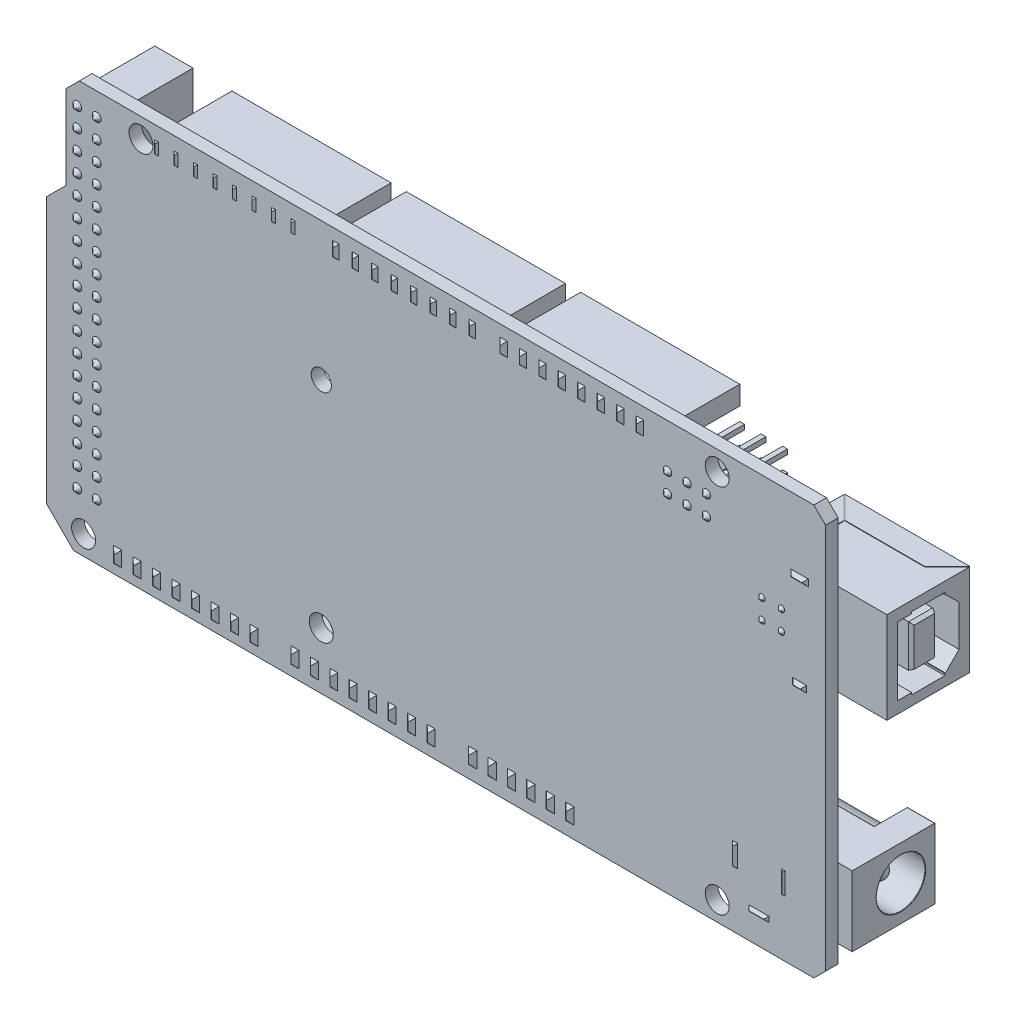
SolidWorks part; units mm, degrees
ref_plane "Front Plane" through (0, 0, 0) normal (0, 0, 1) x (1, 0, 0)
ref_plane "Top Plane" through (0, 0, 0) normal (0, 1, 0) x (1, 0, 0)
ref_plane "Right Plane" through (0, 0, 0) normal (1, 0, 0) x (0, 0, -1)
sketch "Sketch1" plane through (0, 0, 0) normal (0, 0, 1) x (1, 0, 0)
  line L1 (-50.8, 26.7081) -> (50.8, 26.7081)
  line L2 (-50.8, 26.7081) -> (-50.8, -26.7081)
  line L3 (-50.8, -26.7081) -> (50.8, -26.7081)
  line L4 (50.8, 26.7081) -> (50.8, -26.7081)
  line L5 (-50.8, 26.7081) -> (50.8, -26.7081) construction
  line L6 (-50.8, -26.7081) -> (50.8, 26.7081) construction
  point P0 (0, 0)
  dimension "D1" = 101.6
  dimension "D2" = 53.4162
extrude "Boss-Extrude1" add sketch "Sketch1" along normal blind 1.651
sketch "Sketch2" plane through (0, 0, 0) normal (0, 0, -1) x (-1, 0, 0)
  line L0 (50.8, -26.7081) -> (-50.8, -26.7081) construction
  line L1 (41.7576, 25.4889) -> (46.736, 25.4889)
  line L2 (41.7576, 25.4889) -> (41.7576, -20.7899)
  line L3 (41.7576, -20.7899) -> (46.736, -20.7899)
  line L4 (46.736, 25.4889) -> (46.736, -20.7899)
  line L5 (41.7576, 25.4889) -> (46.736, -20.7899) construction
  line L6 (41.7576, -20.7899) -> (46.736, 25.4889) construction
  line L7 (50.8, 26.7081) -> (50.8, -26.7081) construction
  line L8 (-50.8, 26.7081) -> (50.8, 26.7081) construction
  line L9 (36.6776, 25.4381) -> (15.9258, 25.4381)
  line L10 (36.6776, 25.4381) -> (36.6776, 22.9743)
  line L11 (36.6776, 22.9743) -> (15.9258, 22.9743)
  line L12 (15.9258, 25.4381) -> (15.9258, 22.9743)
  line L13 (36.6776, 25.4381) -> (15.9258, 22.9743) construction
  line L14 (36.6776, 22.9743) -> (15.9258, 25.4381) construction
  line L15 (-6.8072, 25.4381) -> (-6.8072, 22.9743)
  line L16 (13.9446, 25.4381) -> (-6.8072, 25.4381)
  line L17 (13.9446, 22.9743) -> (-6.8072, 22.9743)
  line L18 (13.9446, 25.4381) -> (13.9446, 22.9743)
  line L19 (-29.5402, 25.4381) -> (-29.5402, 22.9743)
  line L20 (-8.7884, 25.4381) -> (-29.5402, 25.4381)
  line L21 (-8.7884, 22.9743) -> (-29.5402, 22.9743)
  line L22 (-8.7884, 25.4381) -> (-8.7884, 22.9743)
  line L23 (15.9258, 25.4381) -> (-6.8072, 25.4381) construction
  line L24 (-1.016, -22.8981) -> (-1.016, -25.3619)
  line L25 (42.545, -22.8981) -> (21.717, -22.8981)
  line L26 (42.545, -22.8981) -> (42.545, -25.3619)
  line L27 (42.545, -25.3619) -> (21.717, -25.3619)
  line L28 (21.717, -22.8981) -> (21.717, -25.3619)
  line L29 (42.545, -22.8981) -> (21.717, -25.3619) construction
  line L30 (42.545, -25.3619) -> (21.717, -22.8981) construction
  line L31 (19.812, -22.8981) -> (19.812, -25.3619)
  line L32 (19.812, -22.8981) -> (-1.016, -22.8981)
  line L33 (19.812, -25.3619) -> (-1.016, -25.3619)
  line L35 (-3.175, -22.9125) -> (-18.8722, -22.9125)
  line L36 (-3.175, -22.9125) -> (-3.175, -25.3619)
  line L37 (-3.175, -25.3619) -> (-18.8722, -25.3619)
  line L38 (-18.8722, -22.9125) -> (-18.8722, -25.3619)
  point P0 (44.2468, 2.3495)
  point P9 (26.3017, 24.2062)
  point P16 (32.131, -24.13)
  dimension "D1" = 4.9784
  dimension "D2" = 46.2788
  dimension "D3" = 5.9182
  dimension "D4" = 4.064
  dimension "D5" = 20.7518
  dimension "D6" = 2.4638
  dimension "D7" = 1.27
  dimension "D8" = 5.08
  dimension "D10" = 22.733
  dimension "D11" = 2.4638
  dimension "D12" = 20.828
  dimension "D13" = 8.255
  dimension "D14" = 1.3462
  dimension "D15" = 15.6972
  dimension "D16" = 2
  dimension "D17" = 2.159
  dimension "D9" = 3
extrude "Boss-Extrude2" add sketch "Sketch2" along normal blind 8.5598
sketch "Sketch3" plane through (0, 0, 0) normal (0, 0, -1) x (-1, 0, 0)
  line L0 (-50.8, -26.7081) -> (-50.8, 26.7081) construction
  line L1 (-57.15, 17.4371) -> (-40.8432, 17.4371)
  line L2 (-57.15, 17.4371) -> (-57.15, 5.4991)
  line L3 (-57.15, 5.4991) -> (-40.8432, 5.4991)
  line L4 (-40.8432, 17.4371) -> (-40.8432, 5.4991)
  line L5 (-57.15, 17.4371) -> (-40.8432, 5.4991) construction
  line L6 (-57.15, 5.4991) -> (-40.8432, 17.4371) construction
  line L7 (-50.8, 26.7081) -> (50.8, 26.7081) construction
  point P0 (-48.9966, 11.4681)
  dimension "D1" = 16.3068
  dimension "D2" = 11.938
  dimension "D3" = 6.35
  dimension "D4" = 9.271
extrude "Boss-Extrude3" add sketch "Sketch3" along normal blind 10.795
sketch "Sketch4" plane through (0, 0, 0) normal (0, 0, -1) x (-1, 0, 0)
  line L0 (-50.8, -26.7081) -> (-50.8, 5.4991) construction
  line L1 (-52.6288, -13.7541) -> (-38.4048, -13.7541)
  line L2 (-52.6288, -13.7541) -> (-52.6288, -22.8981)
  line L3 (-52.6288, -22.8981) -> (-38.4048, -22.8981)
  line L4 (-38.4048, -13.7541) -> (-38.4048, -22.8981)
  line L5 (-52.6288, -13.7541) -> (-38.4048, -22.8981) construction
  line L6 (-52.6288, -22.8981) -> (-38.4048, -13.7541) construction
  line L7 (50.8, -26.7081) -> (-50.8, -26.7081) construction
  point P0 (-45.5168, -18.3261)
  dimension "D1" = 9.144
  dimension "D2" = 14.224
  dimension "D3" = 1.8288
  dimension "D4" = 3.81
extrude "Boss-Extrude4" add sketch "Sketch4" along normal blind 6.477
sketch "Sketch5" plane through (0, 0, -6.477) normal (0, 0, -1) x (-1, 0, 0)
  line L0 (-52.6288, -22.8981) -> (-38.4048, -22.8981) construction
  line L1 (-52.6288, -13.7541) -> (-49.0728, -13.7541)
  line L2 (-52.6288, -13.7541) -> (-52.6288, -22.8981)
  line L3 (-52.6288, -22.8981) -> (-49.0728, -22.8981)
  line L4 (-49.0728, -13.7541) -> (-49.0728, -22.8981)
  dimension "D1" = 3.556
extrude "Boss-Extrude5" add sketch "Sketch5" along normal blind 4.318
sketch "Sketch6" plane through (49.0728, 0, 0) normal (-1, 0, 0) x (0, 0, 1)
  line L0 (-6.477, -22.8981) -> (-6.477, -13.7541) construction
  line L1 (-6.477, -14.5161) -> (-6.477, -22.1361)
  arc A0 (-6.477, -14.5161) -> (-6.477, -22.1361) centre (-6.477, -18.3261) ccw
  dimension "D1" = 7.62
extrude "Boss-Extrude6" add sketch "Sketch6" along normal up to surface (10.668 mm away)
sketch "Sketch7" plane through (0, 0, -6.477) normal (0, 0, -1) x (-1, 0, 0)
  line L0 (-38.4048, -14.5161) -> (-49.0728, -14.5161) construction
  line L1 (-38.4048, -13.7541) -> (-40.005, -13.7541)
  line L2 (-38.4048, -13.7541) -> (-38.4048, -14.5161)
  line L3 (-38.4048, -14.5161) -> (-40.005, -14.5161)
  line L4 (-40.005, -13.7541) -> (-40.005, -14.5161)
  line L5 (-49.0728, -22.8981) -> (-38.4048, -22.8981) construction
  line L6 (-38.4048, -22.1361) -> (-40.005, -22.1361)
  line L7 (-38.4048, -22.1361) -> (-38.4048, -22.8981)
  line L8 (-38.4048, -22.8981) -> (-40.005, -22.8981)
  line L9 (-40.005, -22.1361) -> (-40.005, -22.8981)
  dimension "D1" = 1.6002
  dimension "D2" = 1.6002
extrude "Cut-Extrude1" cut sketch "Sketch7" against normal up to surface (6.477 mm away)
sketch "Sketch8" plane through (52.6288, 0, 0) normal (1, 0, 0) x (0, 0, -1)
  line L0 (10.795, -18.3261) -> (0, -18.3261) construction
  line L1 (10.795, -13.7541) -> (10.795, -22.8981) construction
  line L2 (0, -13.7541) -> (0, -22.8981) construction
  circle A0 centre (6.35, -18.3261) radius 3.175
  dimension "D1" = 0
  dimension "D2" = 6.35
  dimension "D3" = 4.445
extrude "Cut-Extrude2" cut sketch "Sketch8" against normal blind 12.065
sketch "Sketch9" plane through (40.5638, 0, 0) normal (1, 0, 0) x (0, 0, -1)
  circle A0 centre (6.35, -18.3261) radius 1.016
  dimension "D1" = 2.032
extrude "Boss-Extrude7" add sketch "Sketch9" along normal blind 10.16
fillet "Fillet1" radius 1.016 1 edges at (50.7238, -17.3101, -6.35)
sketch "Sketch10" plane through (57.15, 0, 0) normal (1, 0, 0) x (0, 0, -1)
  line L0 (10.795, 17.4371) -> (0, 5.4991) construction
  line L1 (10.795, 5.4991) -> (0, 17.4371) construction
  line L2 (10.795, 5.4991) -> (0, 5.4991) construction
  line L3 (7.6389, 15.9131) -> (7.5565, 15.9131)
  line L4 (9.4169, 14.1351) -> (9.4169, 8.8011)
  line L5 (7.6389, 7.0231) -> (7.5565, 7.0231)
  line L6 (1.3781, 15.9131) -> (1.3781, 7.0231)
  line L7 (9.4169, 15.9131) -> (1.3781, 7.0231) construction
  line L8 (9.4169, 7.0231) -> (1.3781, 15.9131) construction
  line L9 (9.4169, 11.4681) -> (1.3781, 11.4681) construction
  line L10 (3.2385, 7.0231) -> (1.3781, 7.0231)
  line L11 (7.5565, 7.0231) -> (7.5565, 6.7691)
  line L12 (7.5565, 6.7691) -> (3.2385, 6.7691)
  line L13 (3.2385, 7.0231) -> (3.2385, 6.7691)
  line L14 (7.5565, 7.2771) -> (3.2385, 6.7691) construction
  line L15 (7.5565, 6.7691) -> (3.2385, 7.2771) construction
  line L16 (3.2385, 15.9131) -> (3.2385, 16.1671)
  line L17 (7.5565, 16.1671) -> (3.2385, 16.1671)
  line L18 (7.5565, 15.9131) -> (7.5565, 16.1671)
  line L19 (3.2385, 15.9131) -> (1.3781, 15.9131)
  line L20 (9.4169, 8.8011) -> (7.6389, 7.0231)
  line L21 (9.4169, 14.1351) -> (7.6389, 15.9131)
  point P8 (5.3975, 11.4681)
  point P15 (5.3975, 7.0231)
  dimension "D1" = 1.524
  dimension "D2" = 0.508
  dimension "D3" = 4.318
  dimension "D4" = 1.778
  dimension "D5" = 1.778
  dimension "D6" = 45
  dimension "D7" = 45
extrude "Cut-Extrude3" cut sketch "Sketch10" against normal blind 13.97
sketch "Sketch11" plane through (43.18, 0, 0) normal (1, 0, 0) x (0, 0, -1)
  line L0 (10.795, 17.4371) -> (0, 5.4991) construction
  line L1 (10.795, 5.4991) -> (0, 17.4371) construction
  line L3 (6.9723, 14.2113) -> (3.8227, 14.2113)
  line L4 (6.9723, 14.2113) -> (6.9723, 8.7249)
  line L5 (6.9723, 8.7249) -> (3.8227, 8.7249)
  line L6 (3.8227, 14.2113) -> (3.8227, 8.7249)
  line L7 (6.9723, 14.2113) -> (3.8227, 8.7249) construction
  line L8 (6.9723, 8.7249) -> (3.8227, 14.2113) construction
  point P8 (5.3975, 11.4681)
  dimension "D1" = 3.1496
  dimension "D2" = 5.4864
extrude "Boss-Extrude8" add sketch "Sketch11" along normal blind 13.462
chamfer "Chamfer1" distance 0.254 angle 63 4 edges at (56.642, 14.2113, -5.3975) (56.642, 11.4681, -6.9723) (56.642, 8.7249, -5.3975) (56.642, 11.4681, -3.8227)
ref_plane "Plane1" through (0, 11.4681, 0) normal (0, 1, 0) x (-1, 0, 0)
sketch "Sketch12" plane through (0, 17.4371, 0) normal (0, 1, 0) x (1, 0, 0)
  line L1 (43.7896, 10.795) -> (57.15, 10.795)
  line L2 (40.8432, 10.7315) -> (43.7896, 7.7851)
  line L3 (43.8531, 7.8486) -> (54.2036, 7.8486)
  line L4 (40.8432, 0) -> (43.7896, 0)
  line L5 (40.9067, 10.795) -> (43.8531, 7.8486)
  line L6 (57.15, 10.795) -> (54.2036, 7.8486)
  line L7 (40.8432, 0) -> (40.8432, 10.7315)
  line L8 (40.9067, 10.795) -> (43.7896, 10.795)
  line L9 (43.7896, 0) -> (43.7896, 7.7851)
  dimension "D1" = 2.9464
  dimension "D2" = 45
  dimension "D3" = 2.9464
  dimension "D4" = 45
  dimension "D6" = 45
extrude "Boss-Extrude9" add sketch "Sketch12" along normal blind 0.0635
mirror "Mirror1" about plane through (0, 11.4681, 0) normal (0, 1, 0) of "Boss-Extrude9"
chamfer "Chamfer2" distance 1.524 angle 45 2 edges at (50.8, -26.7081, 0.8255) (50.8, 26.7081, 0.8255)
chamfer "Chamfer3" distance 3.556 angle 45 1 edges at (-50.8, -26.7081, 0.8255)
sketch "Sketch13" plane through (0, 0, 0) normal (0, 0, -1) x (-1, 0, 0)
  line L1 (50.8, 26.7081) -> (50.8, -23.1521) construction
  line L2 (-49.276, 26.7081) -> (50.8, 26.7081) construction
  line L3 (48.26, 24.9447) -> (48.26, 14.0081)
  line L4 (50.8, 11.4681) -> (48.26, 14.0081)
  line L5 (48.26, 24.9447) -> (46.4966, 26.7081)
  line L6 (46.4966, 26.7081) -> (50.8, 26.7081)
  line L7 (50.8, 26.7081) -> (50.8, 11.4681)
  dimension "D2" = 2.54
extrude "Cut-Extrude4" cut sketch "Sketch13" against normal up to next
sketch "Sketch14" plane through (0, 0, 0) normal (0, 0, -1) x (-1, 0, 0)
  line L1 (-6.9605, 8.5631) -> (7.073, 8.5631)
  line L2 (-6.9605, 8.5631) -> (-6.9605, -5.6349)
  line L3 (-6.9605, -5.6349) -> (7.073, -5.6349)
  line L4 (7.073, 8.5631) -> (7.073, -5.6349)
  line L5 (-24.3309, -1.1659) -> (-21.5659, -1.1659)
  line L6 (-24.3309, -1.1659) -> (-24.3309, -2.574)
  line L7 (-24.3309, -2.574) -> (-21.5659, -2.574)
  line L8 (-21.5659, -1.1659) -> (-21.5659, -2.574)
  line L9 (-33.5092, 10.32) -> (-28.4497, 10.32)
  line L10 (-33.5092, 10.32) -> (-33.5092, 5.3949)
  line L11 (-33.5092, 5.3949) -> (-28.4497, 5.3949)
  line L12 (-28.4497, 10.32) -> (-28.4497, 5.3949)
  line L13 (-43.9403, -6.0414) -> (-40.6713, -6.0414)
  line L14 (-43.9403, -6.0414) -> (-43.9403, -12.5341)
  line L15 (-43.9403, -12.5341) -> (-40.6713, -12.5341)
  line L16 (-40.6713, -6.0414) -> (-40.6713, -12.5341)
  line L17 (-31.173, -23.0456) -> (-27.138, -23.0456)
  line L18 (-31.173, -23.0456) -> (-31.173, -25.4924)
  line L19 (-31.173, -25.4924) -> (-27.138, -25.4924)
  line L20 (-27.138, -23.0456) -> (-27.138, -25.4924)
  line L21 (-33.7999, -4.2562) -> (-30.9794, -4.2562)
  line L22 (-33.7999, -4.2562) -> (-33.7999, -7.1173)
  line L23 (-33.7999, -7.1173) -> (-30.9794, -7.1173)
  line L24 (-30.9794, -4.2562) -> (-30.9794, -7.1173)
  line L25 (-32.8056, -8.9233) -> (-31.8519, -8.9233)
  line L26 (-32.8056, -8.9233) -> (-32.8056, -12.1294)
  line L27 (-32.8056, -12.1294) -> (-31.8519, -12.1294)
  line L28 (-31.8519, -8.9233) -> (-31.8519, -12.1294)
  line L29 (-30.0459, -9.4914) -> (-28.4497, -9.4914)
  line L30 (-30.0459, -9.4914) -> (-30.0459, -10.2219)
  line L31 (-30.0459, -10.2219) -> (-28.4497, -10.2219)
  line L32 (-28.4497, -9.4914) -> (-28.4497, -10.2219)
  line L33 (-36.7827, -8.6595) -> (-35.9914, -8.6595)
  line L34 (-36.7827, -8.6595) -> (-36.7827, -10.2219)
  line L35 (-36.7827, -10.2219) -> (-35.9914, -10.2219)
  line L36 (-35.9914, -8.6595) -> (-35.9914, -10.2219)
  line L37 (-48.1172, 1.9462) -> (-44.9541, 1.9462)
  line L38 (-48.1172, 1.9462) -> (-48.1172, -2.574)
  line L39 (-48.1172, -2.574) -> (-44.9541, -2.574)
  line L40 (-44.9541, 1.9462) -> (-44.9541, -2.574)
  line L41 (-42.3058, 0.1921) -> (-41.1584, 0.1921)
  line L42 (-42.3058, 0.1921) -> (-42.3058, -2.574)
  line L43 (-42.3058, -2.574) -> (-41.1584, -2.574)
  line L44 (-41.1584, 0.1921) -> (-41.1584, -2.574)
  line L45 (-12.8797, -19.5259) -> (-11.332, -19.5259)
  line L46 (-12.8797, -19.5259) -> (-12.8797, -20.252)
  line L47 (-12.8797, -20.252) -> (-11.332, -20.252)
  line L48 (-11.332, -19.5259) -> (-11.332, -20.252)
  line L49 (-17.7394, -11.1441) -> (-16.7743, -11.1441)
  line L50 (-17.7394, -11.1441) -> (-17.7394, -13.2747)
  line L51 (-17.7394, -13.2747) -> (-16.7743, -13.2747)
  line L52 (-16.7743, -11.1441) -> (-16.7743, -13.2747)
  line L53 (-10.7102, -11.6175) -> (-9.7086, -11.6175)
  line L54 (-10.7102, -11.6175) -> (-10.7102, -13.0744)
  line L55 (-10.7102, -13.0744) -> (-9.7086, -13.0744)
  line L56 (-9.7086, -11.6175) -> (-9.7086, -13.0744)
  line L57 (-13.0047, -10.7617) -> (-11.73, -10.7617)
  line L58 (-13.0047, -10.7617) -> (-13.0047, -14.0213)
  line L59 (-13.0047, -14.0213) -> (-11.73, -14.0213)
  line L60 (-11.73, -10.7617) -> (-11.73, -14.0213)
  line L61 (-16.091, -10.7617) -> (-14.2392, -10.7617)
  line L62 (-16.091, -10.7617) -> (-16.091, -14.0213)
  line L63 (-16.091, -14.0213) -> (-14.2392, -14.0213)
  line L64 (-14.2392, -10.7617) -> (-14.2392, -14.0213)
  line L65 (-23.6628, -8.3755) -> (-22.1074, -8.3755)
  line L66 (-23.6628, -8.3755) -> (-23.6628, -9.1237)
  line L67 (-23.6628, -9.1237) -> (-22.1074, -9.1237)
  line L68 (-22.1074, -8.3755) -> (-22.1074, -9.1237)
  line L69 (-23.5707, -5.0699) -> (-22.0069, -5.0699)
  line L70 (-23.5707, -5.0699) -> (-23.5707, -5.8311)
  line L71 (-23.5707, -5.8311) -> (-22.0069, -5.8311)
  line L72 (-22.0069, -5.0699) -> (-22.0069, -5.8311)
  line L73 (-39.6477, 4.309) -> (-38.0454, 4.309)
  line L74 (-39.6477, 4.309) -> (-39.6477, 3.6337)
  line L75 (-39.6477, 3.6337) -> (-38.0454, 3.6337)
  line L76 (-38.0454, 4.309) -> (-38.0454, 3.6337)
  line L77 (-39.5152, 2.6802) -> (-38.0454, 2.6802)
  line L78 (-39.5152, 2.6802) -> (-39.5152, 1.9462)
  line L79 (-39.5152, 1.9462) -> (-38.0454, 1.9462)
  line L80 (-38.0454, 2.6802) -> (-38.0454, 1.9462)
  line L81 (-36.3871, 2.6802) -> (-34.854, 2.6802)
  line L82 (-36.3871, 2.6802) -> (-36.3871, 1.9462)
  line L83 (-36.3871, 1.9462) -> (-34.854, 1.9462)
  line L84 (-34.854, 2.6802) -> (-34.854, 1.9462)
  line L85 (-33.1723, 2.8127) -> (-31.5965, 2.8127)
  line L86 (-33.1723, 2.8127) -> (-33.1723, 1.9462)
  line L87 (-33.1723, 1.9462) -> (-31.5965, 1.9462)
  line L88 (-31.5965, 2.8127) -> (-31.5965, 1.9462)
  line L89 (-30.0459, 2.8127) -> (-28.5657, 2.8127)
  line L90 (-30.0459, 2.8127) -> (-30.0459, 1.9462)
  line L91 (-30.0459, 1.9462) -> (-28.5657, 1.9462)
  line L92 (-28.5657, 2.8127) -> (-28.5657, 1.9462)
  line L93 (-26.941, 2.8127) -> (-25.3776, 2.8127)
  line L94 (-26.941, 2.8127) -> (-26.941, 1.9462)
  line L95 (-26.941, 1.9462) -> (-25.3776, 1.9462)
  line L96 (-25.3776, 2.8127) -> (-25.3776, 1.9462)
  line L97 (-23.3697, 5.7605) -> (-22.3121, 5.7605)
  line L98 (-23.3697, 5.7605) -> (-23.3697, 2.5417)
  line L99 (-23.3697, 2.5417) -> (-22.3121, 2.5417)
  line L100 (-22.3121, 5.7605) -> (-22.3121, 2.5417)
  line L101 (-23.8854, 8.0069) -> (-22.1074, 8.0069)
  line L102 (-23.8854, 8.0069) -> (-23.8854, 6.7341)
  line L103 (-23.8854, 6.7341) -> (-22.1074, 6.7341)
  line L104 (-22.1074, 8.0069) -> (-22.1074, 6.7341)
  line L105 (-23.8854, 10.32) -> (-22.1074, 10.32)
  line L106 (-23.8854, 10.32) -> (-23.8854, 9.0606)
  line L107 (-23.8854, 9.0606) -> (-22.1074, 9.0606)
  line L108 (-22.1074, 10.32) -> (-22.1074, 9.0606)
  line L109 (-23.3697, 14.0967) -> (-22.5161, 14.0967)
  line L110 (-23.3697, 14.0967) -> (-23.3697, 10.8407)
  line L111 (-23.3697, 10.8407) -> (-22.5161, 10.8407)
  line L112 (-22.5161, 14.0967) -> (-22.5161, 10.8407)
  line L113 (-23.8854, 15.886) -> (-22.1074, 15.886)
  line L114 (-23.8854, 15.886) -> (-23.8854, 14.654)
  line L115 (-23.8854, 14.654) -> (-22.1074, 14.654)
  line L116 (-22.1074, 15.886) -> (-22.1074, 14.654)
  line L117 (-23.7484, 17.9417) -> (-22.3121, 17.9417)
  line L118 (-23.7484, 17.9417) -> (-23.7484, 17.187)
  line L119 (-23.7484, 17.187) -> (-22.3121, 17.187)
  line L120 (-22.3121, 17.9417) -> (-22.3121, 17.187)
  line L121 (-43.674, 18.8311) -> (-41.7321, 18.8311)
  line L122 (-43.674, 18.8311) -> (-43.674, 17.7416)
  line L123 (-43.674, 17.7416) -> (-41.7321, 17.7416)
  line L124 (-41.7321, 18.8311) -> (-41.7321, 17.7416)
  line L125 (-39.6477, 15.6816) -> (-38.0454, 15.6816)
  line L126 (-39.6477, 15.6816) -> (-39.6477, 14.9091)
  line L127 (-39.6477, 14.9091) -> (-38.0454, 14.9091)
  line L128 (-38.0454, 15.6816) -> (-38.0454, 14.9091)
  line L129 (-39.6477, 13.3641) -> (-38.0454, 13.3641)
  line L130 (-39.6477, 13.3641) -> (-39.6477, 12.4687)
  line L131 (-39.6477, 12.4687) -> (-38.0454, 12.4687)
  line L132 (-38.0454, 13.3641) -> (-38.0454, 12.4687)
  line L133 (-39.3497, 11.7365) -> (-38.3867, 11.7365)
  line L134 (-39.3497, 11.7365) -> (-39.3497, 8.5631)
  line L135 (-39.3497, 8.5631) -> (-38.3867, 8.5631)
  line L136 (-38.3867, 11.7365) -> (-38.3867, 8.5631)
  line L137 (-39.6477, 7.8575) -> (-38.0454, 7.8575)
  line L138 (-39.6477, 7.8575) -> (-39.6477, 6.9215)
  line L139 (-39.6477, 6.9215) -> (-38.0454, 6.9215)
  line L140 (-38.0454, 7.8575) -> (-38.0454, 6.9215)
  line L141 (24.8756, 10.8407) -> (26.6802, 10.8407)
  line L142 (24.8756, 10.8407) -> (24.8756, 9.4206)
  line L143 (24.8756, 9.4206) -> (26.6802, 9.4206)
  line L144 (26.6802, 10.8407) -> (26.6802, 9.4206)
  line L145 (29.6259, 11.7365) -> (30.8732, 11.7365)
  line L146 (29.6259, 11.7365) -> (29.6259, 8.3325)
  line L147 (29.6259, 8.3325) -> (30.8732, 8.3325)
  line L148 (30.8732, 11.7365) -> (30.8732, 8.3325)
  line L149 (-38.9776, 20.9935) -> (-37.1574, 20.9935)
  line L150 (-38.9776, 20.9935) -> (-38.9776, 17.7416)
  line L151 (-38.9776, 17.7416) -> (-37.1574, 17.7416)
  line L152 (-37.1574, 20.9935) -> (-37.1574, 17.7416)
extrude "Boss-Extrude10" add sketch "Sketch14" along normal blind 1.397
sketch "Sketch15" plane through (0, 0, 0) normal (0, 0, -1) x (-1, 0, 0)
  line L1 (20.5142, 4.069) -> (26.9751, 4.069)
  line L2 (20.5142, 4.069) -> (20.5142, -2.21)
  line L3 (20.5142, -2.21) -> (26.9751, -2.21)
  line L4 (26.9751, 4.069) -> (26.9751, -2.21)
extrude "Boss-Extrude11" add sketch "Sketch15" along normal blind 2.286
sketch "Sketch16" plane through (0, 0, -2.286) normal (0, 0, -1) x (-1, 0, 0)
  line L0 (20.5142, 4.069) -> (26.9751, -2.21) construction
  circle A0 centre (23.7447, 0.9295) radius 1.524
  dimension "D1" = 3.048
extrude "Boss-Extrude12" add sketch "Sketch16" along normal blind 1.016
sketch "Sketch17" plane through (0, 0, 0) normal (0, 0, -1) x (-1, 0, 0)
  line L0 (-32.3335, 0.8451) -> (-32.3335, -2.9138) construction
  line L1 (-36.2828, -2.9138) -> (-28.3841, -2.9138)
  line L2 (-36.2828, -2.9138) -> (-36.2828, 0.8451) construction
  line L3 (-36.2828, 0.8451) -> (-28.3841, 0.8451)
  line L4 (-28.3841, -2.9138) -> (-28.3841, 0.8451) construction
  arc A0 (-36.2828, -2.9138) -> (-36.2828, 0.8451) centre (-35.9606, -1.0343) cw
  arc A1 (-28.3841, -2.9138) -> (-28.3841, 0.8451) centre (-28.7063, -1.0343) ccw
extrude "Boss-Extrude13" add sketch "Sketch17" along normal blind 3.3528
fillet "Fillet2" radius 0.508 4 edges at (32.3335, 0.8451, -3.3528) (26.7995, -1.0343, -3.3528) (32.3335, -2.9138, -3.3528) (37.8675, -1.0343, -3.3528)
sketch "Sketch19" plane through (0, 0, 0) normal (0, 0, -1) x (-1, 0, 0)
  circle A0 centre (-32.7701, -18.1074) radius 3.302
  circle A1 centre (-25.5812, -18.1074) radius 3.302
  dimension "D1" = 6.604
extrude "Boss-Extrude14" add sketch "Sketch19" along normal blind 5.461
fillet "Fillet3" radius 0.254 2 edges at (22.2792, -18.1074, -5.461) (29.4681, -18.1074, -5.461)
sketch "Sketch20" plane through (0, 0, 0) normal (0, 0, -1) x (-1, 0, 0)
  line L0 (11.7084, 3.2926) -> (12.7244, 2.2766)
  line L1 (16.103, 4.9732) -> (17.119, 3.9572)
  line L2 (11.7084, 3.9572) -> (11.7084, 3.2926)
  line L3 (12.7244, 2.2766) -> (16.103, 2.2766)
  line L4 (17.119, 3.9572) -> (17.119, 3.2926)
  line L5 (16.103, 2.2766) -> (17.119, 3.2926)
  line L6 (12.7244, 4.9732) -> (16.103, 4.9732)
  line L7 (12.7244, 2.1792) -> (16.103, 2.1792)
  line L8 (12.7244, -0.5174) -> (16.103, -0.5174)
  line L9 (11.7084, 3.9572) -> (12.7244, 4.9732)
  line L10 (11.7084, 0.4986) -> (12.7244, -0.5174)
  line L11 (11.7084, 1.1632) -> (11.7084, 0.4986)
  line L12 (11.7084, 1.1632) -> (12.7244, 2.1792)
  line L13 (16.103, 2.1792) -> (17.119, 1.1632)
  line L14 (17.119, 1.1632) -> (17.119, 0.4986)
  line L15 (16.103, -0.5174) -> (17.119, 0.4986)
  line L16 (12.7244, -0.6148) -> (16.103, -0.6148)
  line L17 (-36.5713, 21.0509) -> (-35.5553, 22.0669)
  line L18 (-35.5553, 22.0669) -> (-34.8949, 22.0669)
  line L19 (-36.5713, 21.0509) -> (-36.5713, 17.6727)
  line L20 (-35.5553, 16.6567) -> (-34.8949, 16.6567)
  line L21 (-33.8789, 21.0509) -> (-33.8789, 17.6727)
  line L22 (12.7244, -3.3114) -> (16.103, -3.3114)
  line L23 (11.7084, -2.2954) -> (12.7244, -3.3114)
  line L24 (11.7084, -1.6308) -> (11.7084, -2.2954)
  line L25 (11.7084, -1.6308) -> (12.7244, -0.6148)
  line L26 (16.103, -0.6148) -> (17.119, -1.6308)
  line L27 (17.119, -1.6308) -> (17.119, -2.2954)
  line L28 (16.103, -3.3114) -> (17.119, -2.2954)
  line L29 (12.7244, 4.9732) -> (12.7244, 2.1792) construction
  line L30 (-34.8949, 22.0669) -> (-33.8789, 21.0509)
  line L31 (-34.8949, 16.6567) -> (-33.8789, 17.6727)
  line L32 (-36.5713, 17.6727) -> (-35.5553, 16.6567)
  line L33 (-32.7613, 22.0669) -> (-32.1009, 22.0669)
  line L34 (-32.1009, 22.0669) -> (-31.0849, 21.0509)
  line L35 (-31.0849, 21.0509) -> (-31.0849, 17.6727)
  line L36 (-32.1009, 16.6567) -> (-31.0849, 17.6727)
  line L37 (-32.7613, 16.6567) -> (-32.1009, 16.6567)
  line L38 (-33.7773, 17.6727) -> (-32.7613, 16.6567)
  line L39 (-33.7773, 21.0509) -> (-33.7773, 17.6727)
  line L40 (-33.7773, 21.0509) -> (-32.7613, 22.0669)
  line L41 (-29.9673, 22.0669) -> (-29.3069, 22.0669)
  line L42 (-29.3069, 22.0669) -> (-28.2909, 21.0509)
  line L43 (-28.2909, 21.0509) -> (-28.2909, 17.6727)
  line L44 (-29.3069, 16.6567) -> (-28.2909, 17.6727)
  line L45 (-29.9673, 16.6567) -> (-29.3069, 16.6567)
  line L46 (-30.9833, 17.6727) -> (-29.9673, 16.6567)
  line L47 (-30.9833, 21.0509) -> (-30.9833, 17.6727)
  line L48 (-30.9833, 21.0509) -> (-29.9673, 22.0669)
  line L49 (-35.5553, 22.0669) -> (-32.7613, 22.0669) construction
  point P0 (11.7084, 4.9732)
  point P1 (17.119, -2.9495)
  point P2 (11.7084, -2.9495)
  point P3 (17.119, 4.9732)
  point P5 (17.119, 2.2766)
  point P6 (11.7084, 2.2766)
  point P14 (-36.5713, 22.0669)
  point P33 (-33.8789, 16.6567)
  point P34 (-36.5713, 16.6567)
  point P35 (-33.8789, 22.0669)
  dimension "D1" = 3
  dimension "D2" = 2.794
  dimension "D3" = 2.6965
  dimension "D4" = 5.4102
  dimension "D5" = 2.6924
  dimension "D6" = 5.4106
  dimension "D7" = 2.794
extrude "Boss-Extrude15" add sketch "Sketch20" along normal blind 2.54
sketch "Sketch21" plane through (0, 0, -2.54) normal (0, 0, -1) x (-1, 0, 0)
  line L0 (11.7084, 3.6249) -> (17.119, 3.6249) construction
  line L1 (11.7084, 3.9572) -> (11.7084, 3.2926) construction
  line L2 (17.119, 3.2926) -> (17.119, 3.9572) construction
  line L3 (14.4137, 4.9732) -> (14.4137, -3.3114) construction
  line L4 (16.103, 4.9732) -> (12.7244, 4.9732) construction
  line L5 (12.7244, -3.3114) -> (16.103, -3.3114) construction
  line L6 (12.7627, 1.1484) -> (13.3977, 1.1484)
  line L7 (12.7627, 3.9424) -> (13.3977, 3.9424)
  line L8 (12.7627, 3.9424) -> (12.7627, 3.3074)
  line L9 (12.7627, 3.3074) -> (13.3977, 3.3074)
  line L10 (13.3977, 3.9424) -> (13.3977, 3.3074)
  line L11 (12.7627, 3.9424) -> (13.3977, 3.3074) construction
  line L12 (12.7627, 3.3074) -> (13.3977, 3.9424) construction
  line L13 (12.7627, 1.1484) -> (12.7627, 0.5134)
  line L14 (13.3977, 1.1484) -> (13.3977, 0.5134)
  line L15 (12.7627, 0.5134) -> (13.3977, 0.5134)
  line L16 (12.7627, -1.6456) -> (13.3977, -1.6456)
  line L17 (12.7627, -1.6456) -> (12.7627, -2.2806)
  line L18 (13.3977, -1.6456) -> (13.3977, -2.2806)
  line L19 (12.7627, -2.2806) -> (13.3977, -2.2806)
  line L20 (12.7627, 3.9424) -> (12.7627, 1.1484) construction
  line L21 (15.4297, -1.6456) -> (15.4297, -2.2806)
  line L22 (16.0647, -2.2806) -> (15.4297, -2.2806)
  line L23 (16.0647, -1.6456) -> (16.0647, -2.2806)
  line L24 (16.0647, -1.6456) -> (15.4297, -1.6456)
  line L25 (16.0647, 0.5134) -> (15.4297, 0.5134)
  line L26 (15.4297, 1.1484) -> (15.4297, 0.5134)
  line L27 (16.0647, 1.1484) -> (16.0647, 0.5134)
  line L28 (16.0647, 1.1484) -> (15.4297, 1.1484)
  line L29 (16.0647, 3.3074) -> (15.4297, 3.3074)
  line L30 (15.4297, 3.9424) -> (15.4297, 3.3074)
  line L31 (16.0647, 3.9424) -> (16.0647, 3.3074)
  line L32 (16.0647, 3.9424) -> (15.4297, 3.9424)
  line L33 (-36.5713, 19.3618) -> (-28.2909, 19.3618) construction
  line L34 (-36.5713, 21.0509) -> (-36.5713, 17.6727) construction
  line L35 (-28.2909, 17.6727) -> (-28.2909, 21.0509) construction
  line L36 (-35.2251, 22.0669) -> (-35.2251, 16.6567) construction
  line L37 (-34.8949, 22.0669) -> (-35.5553, 22.0669) construction
  line L38 (-35.5553, 16.6567) -> (-34.8949, 16.6567) construction
  line L39 (-32.7486, 18.3458) -> (-32.7486, 17.7108)
  line L40 (-35.5426, 18.3458) -> (-34.9076, 18.3458)
  line L41 (-35.5426, 18.3458) -> (-35.5426, 17.7108)
  line L42 (-35.5426, 17.7108) -> (-34.9076, 17.7108)
  line L43 (-34.9076, 18.3458) -> (-34.9076, 17.7108)
  line L44 (-35.5426, 18.3458) -> (-34.9076, 17.7108) construction
  line L45 (-35.5426, 17.7108) -> (-34.9076, 18.3458) construction
  line L46 (-32.7486, 18.3458) -> (-32.1136, 18.3458)
  line L47 (-32.1136, 18.3458) -> (-32.1136, 17.7108)
  line L48 (-32.7486, 17.7108) -> (-32.1136, 17.7108)
  line L49 (-29.9546, 18.3458) -> (-29.9546, 17.7108)
  line L50 (-29.9546, 18.3458) -> (-29.3196, 18.3458)
  line L51 (-29.3196, 18.3458) -> (-29.3196, 17.7108)
  line L52 (-29.9546, 17.7108) -> (-29.3196, 17.7108)
  line L53 (-35.5426, 18.3458) -> (-32.7486, 18.3458) construction
  line L54 (-29.9546, 21.0128) -> (-29.3196, 21.0128)
  line L55 (-29.3196, 20.3778) -> (-29.3196, 21.0128)
  line L56 (-29.9546, 20.3778) -> (-29.9546, 21.0128)
  line L57 (-29.9546, 20.3778) -> (-29.3196, 20.3778)
  line L58 (-32.7486, 21.0128) -> (-32.1136, 21.0128)
  line L59 (-32.1136, 20.3778) -> (-32.1136, 21.0128)
  line L60 (-32.7486, 20.3778) -> (-32.7486, 21.0128)
  line L61 (-32.7486, 20.3778) -> (-32.1136, 20.3778)
  line L62 (-35.5426, 21.0128) -> (-34.9076, 21.0128)
  line L63 (-34.9076, 20.3778) -> (-34.9076, 21.0128)
  line L64 (-35.5426, 20.3778) -> (-34.9076, 20.3778)
  line L65 (-35.5426, 20.3778) -> (-35.5426, 21.0128)
  point P12 (13.0802, 3.6249)
  point P51 (-35.2251, 18.0283)
  dimension "D1" = 0.635
  dimension "D2" = 0.635
  dimension "D4" = 2.794
  dimension "D5" = 1.016
  dimension "D6" = 1.016
  dimension "D7" = 0.635
  dimension "D8" = 0.635
  dimension "D9" = 2.794
  dimension "D3" = 3
  dimension "D10" = 3
extrude "Boss-Extrude16" add sketch "Sketch21" along normal blind 6.223
chamfer "Chamfer4" distance 0.127 angle 45 48 edges at (-12.7627, -1.9631, -8.763) (-13.0802, -1.6456, -8.763) (-13.3977, -1.9631, -8.763) (-13.0802, -2.2806, -8.763) (-12.7627, 0.8309, -8.763) (-13.0802, 1.1484, -8.763) (-13.3977, 0.8309, -8.763) (-13.0802, 0.5134, -8.763) (-13.0802, 3.3074, -8.763) (-12.7627, 3.6249, -8.763) (-13.0802, 3.9424, -8.763) (-13.3977, 3.6249, -8.763) (-15.7472, 3.3074, -8.763) (-15.4297, 3.6249, -8.763) (-15.7472, 3.9424, -8.763) (-16.0647, 3.6249, -8.763) (-15.7472, 0.5134, -8.763) (-15.4297, 0.8309, -8.763) (-15.7472, 1.1484, -8.763) (-16.0647, 0.8309, -8.763) (-16.0647, -1.9631, -8.763) (-15.7472, -2.2806, -8.763) (-15.4297, -1.9631, -8.763) (-15.7472, -1.6456, -8.763) (35.2251, 17.7108, -8.763) (35.5426, 18.0283, -8.763) (35.2251, 18.3458, -8.763) (34.9076, 18.0283, -8.763) (35.2251, 21.0128, -8.763) (34.9076, 20.6953, -8.763) (35.2251, 20.3778, -8.763) (35.5426, 20.6953, -8.763) (32.4311, 21.0128, -8.763) (32.1136, 20.6953, -8.763) (32.4311, 20.3778, -8.763) (32.7486, 20.6953, -8.763) (29.6371, 21.0128, -8.763) (29.3196, 20.6953, -8.763) (29.6371, 20.3778, -8.763) (29.9546, 20.6953, -8.763) (32.7486, 18.0283, -8.763) (32.4311, 18.3458, -8.763) (32.1136, 18.0283, -8.763) (32.4311, 17.7108, -8.763) (29.9546, 18.0283, -8.763) (29.6371, 18.3458, -8.763) (29.3196, 18.0283, -8.763) (29.6371, 17.7108, -8.763)
sketch "Sketch22" plane through (0, 0, 0) normal (0, 0, -1) x (-1, 0, 0)
  line L0 (-50.8, -25.1841) -> (-50.8, -22.8981) construction
  line L1 (47.244, -26.7081) -> (-49.276, -26.7081) construction
  line L2 (-36.6776, -24.1681) -> (-36.6776, 25.7302) construction
  line L3 (-49.276, 26.7081) -> (46.4966, 26.7081) construction
  line L4 (14.9479, -19.2896) -> (14.9479, 8.7266) construction
  line L5 (50.8, 11.4681) -> (50.8, -23.1521) construction
  circle A0 centre (38.4556, 24.1681) radius 1.5621
  circle A1 centre (14.9479, 8.7266) radius 1.3153
  circle A2 centre (14.9479, -19.2896) radius 1.5621
  circle A3 centre (45.9486, -24.1681) radius 1.5621
  circle A4 centre (-36.6776, -24.1681) radius 1.5621
  circle A5 centre (-36.6776, 24.1681) radius 1.5621
  dimension "D1" = 3.1242
  dimension "D2" = 14.1224
  dimension "D3" = 2.54
  dimension "D4" = 2.54
  dimension "D5" = 82.6262
  dimension "D6" = 2.54
  dimension "D7" = 2.54
  dimension "D8" = 75.1332
  dimension "D9" = 28.0162
  dimension "D10" = 0
  dimension "D11" = 0
  dimension "D12" = 0
  dimension "D13" = 35.8521
extrude "Cut-Extrude5" cut sketch "Sketch22" against normal up to next
sketch "Sketch24" plane through (0, 0, -8.5598) normal (0, 0, -1) x (-1, 0, 0)
  line L0 (44.2468, 25.4889) -> (44.2468, -20.7899) construction
  line L1 (46.736, 25.4889) -> (41.7576, 25.4889) construction
  line L2 (41.7576, -20.7899) -> (46.736, -20.7899) construction
  line L3 (44.2468, 25.4889) -> (46.736, 25.4889) construction
  line L4 (41.7576, 2.3495) -> (46.736, 2.3495) construction
  line L5 (41.7576, 25.4889) -> (41.7576, -20.7899) construction
  line L6 (46.736, -20.7899) -> (46.736, 25.4889) construction
  line L7 (45.4914, 25.4889) -> (45.4914, 2.3495) construction
  line L8 (42.6402, 24.1681) -> (42.6402, 23.4442)
  line L9 (43.3641, 23.4442) -> (42.6402, 23.4442)
  line L10 (45.1294, 24.1681) -> (45.8533, 24.1681)
  line L11 (45.1294, 24.1681) -> (45.1294, 23.4442)
  line L12 (45.1294, 23.4442) -> (45.8533, 23.4442)
  line L13 (45.8533, 24.1681) -> (45.8533, 23.4442)
  line L14 (45.1294, 24.1681) -> (45.8533, 23.4442) construction
  line L15 (45.1294, 23.4442) -> (45.8533, 24.1681) construction
  line L16 (43.3641, 24.1681) -> (42.6402, 24.1681)
  line L17 (43.3641, 24.1681) -> (43.3641, 23.4442)
  line L18 (43.3642, 21.6281) -> (42.6403, 21.6281)
  line L19 (42.6403, 21.6281) -> (42.6403, 20.9042)
  line L20 (43.3642, 20.9042) -> (42.6403, 20.9042)
  line L21 (43.3642, 21.6281) -> (43.3642, 20.9042)
  line L22 (45.1295, 21.6281) -> (45.8534, 21.6281)
  line L23 (45.1295, 21.6281) -> (45.1295, 20.9042)
  line L24 (45.1295, 20.9042) -> (45.8534, 20.9042)
  line L25 (45.8534, 21.6281) -> (45.8534, 20.9042)
  line L26 (43.3642, 19.0881) -> (42.6403, 19.0881)
  line L27 (42.6403, 19.0881) -> (42.6403, 18.3642)
  line L28 (43.3642, 18.3642) -> (42.6403, 18.3642)
  line L29 (43.3642, 19.0881) -> (43.3642, 18.3642)
  line L30 (45.1295, 19.0881) -> (45.8534, 19.0881)
  line L31 (45.1295, 19.0881) -> (45.1295, 18.3642)
  line L32 (45.1295, 18.3642) -> (45.8534, 18.3642)
  line L33 (45.8534, 19.0881) -> (45.8534, 18.3642)
  line L34 (43.3642, 16.5481) -> (42.6403, 16.5481)
  line L35 (42.6403, 16.5481) -> (42.6403, 15.8242)
  line L36 (43.3642, 15.8242) -> (42.6403, 15.8242)
  line L37 (43.3642, 16.5481) -> (43.3642, 15.8242)
  line L38 (45.1295, 16.5481) -> (45.8534, 16.5481)
  line L39 (45.1295, 16.5481) -> (45.1295, 15.8242)
  line L40 (45.1295, 15.8242) -> (45.8534, 15.8242)
  line L41 (45.8534, 16.5481) -> (45.8534, 15.8242)
  line L42 (43.3642, 14.0081) -> (42.6403, 14.0081)
  line L43 (42.6403, 14.0081) -> (42.6403, 13.2842)
  line L44 (43.3642, 13.2842) -> (42.6403, 13.2842)
  line L45 (43.3642, 14.0081) -> (43.3642, 13.2842)
  line L46 (45.1295, 14.0081) -> (45.8534, 14.0081)
  line L47 (45.1295, 14.0081) -> (45.1295, 13.2842)
  line L48 (45.1295, 13.2842) -> (45.8534, 13.2842)
  line L49 (45.8534, 14.0081) -> (45.8534, 13.2842)
  line L50 (43.3642, 11.4681) -> (42.6403, 11.4681)
  line L51 (42.6403, 11.4681) -> (42.6403, 10.7442)
  line L52 (43.3642, 10.7442) -> (42.6403, 10.7442)
  line L53 (43.3642, 11.4681) -> (43.3642, 10.7442)
  line L54 (45.1295, 11.4681) -> (45.8534, 11.4681)
  line L55 (45.1295, 11.4681) -> (45.1295, 10.7442)
  line L56 (45.1295, 10.7442) -> (45.8534, 10.7442)
  line L57 (45.8534, 11.4681) -> (45.8534, 10.7442)
  line L58 (43.3642, 8.9281) -> (42.6403, 8.9281)
  line L59 (42.6403, 8.9281) -> (42.6403, 8.2042)
  line L60 (43.3642, 8.2042) -> (42.6403, 8.2042)
  line L61 (43.3642, 8.9281) -> (43.3642, 8.2042)
  line L62 (45.1295, 8.9281) -> (45.8534, 8.9281)
  line L63 (45.1295, 8.9281) -> (45.1295, 8.2042)
  line L64 (45.1295, 8.2042) -> (45.8534, 8.2042)
  line L65 (45.8534, 8.9281) -> (45.8534, 8.2042)
  line L66 (43.3642, 6.3881) -> (42.6403, 6.3881)
  line L67 (42.6403, 6.3881) -> (42.6403, 5.6642)
  line L68 (43.3642, 5.6642) -> (42.6403, 5.6642)
  line L69 (43.3642, 6.3881) -> (43.3642, 5.6642)
  line L70 (45.1295, 6.3881) -> (45.8534, 6.3881)
  line L71 (45.1295, 6.3881) -> (45.1295, 5.6642)
  line L72 (45.1295, 5.6642) -> (45.8534, 5.6642)
  line L73 (45.8534, 6.3881) -> (45.8534, 5.6642)
  line L74 (43.3642, 3.8481) -> (42.6403, 3.8481)
  line L75 (42.6403, 3.8481) -> (42.6403, 3.1242)
  line L76 (43.3642, 3.1242) -> (42.6403, 3.1242)
  line L77 (43.3642, 3.8481) -> (43.3642, 3.1242)
  line L78 (45.1295, 3.8481) -> (45.8534, 3.8481)
  line L79 (45.1295, 3.8481) -> (45.1295, 3.1242)
  line L80 (45.1295, 3.1242) -> (45.8534, 3.1242)
  line L81 (45.8534, 3.8481) -> (45.8534, 3.1242)
  line L82 (43.3642, 1.3081) -> (42.6403, 1.3081)
  line L83 (42.6403, 1.3081) -> (42.6403, 0.5842)
  line L84 (43.3642, 0.5842) -> (42.6403, 0.5842)
  line L85 (43.3642, 1.3081) -> (43.3642, 0.5842)
  line L86 (45.1295, 1.3081) -> (45.8534, 1.3081)
  line L87 (45.1295, 1.3081) -> (45.1295, 0.5842)
  line L88 (45.1295, 0.5842) -> (45.8534, 0.5842)
  line L89 (45.8534, 1.3081) -> (45.8534, 0.5842)
  line L90 (43.3642, -1.2319) -> (42.6403, -1.2319)
  line L91 (42.6403, -1.2319) -> (42.6403, -1.9558)
  line L92 (43.3642, -1.9558) -> (42.6403, -1.9558)
  line L93 (43.3642, -1.2319) -> (43.3642, -1.9558)
  line L94 (45.1295, -1.2319) -> (45.8534, -1.2319)
  line L95 (45.1295, -1.2319) -> (45.1295, -1.9558)
  line L96 (45.1295, -1.9558) -> (45.8534, -1.9558)
  line L97 (45.8534, -1.2319) -> (45.8534, -1.9558)
  line L98 (43.3642, -3.7719) -> (42.6403, -3.7719)
  line L99 (42.6403, -3.7719) -> (42.6403, -4.4958)
  line L100 (43.3642, -4.4958) -> (42.6403, -4.4958)
  line L101 (43.3642, -3.7719) -> (43.3642, -4.4958)
  line L102 (45.1295, -3.7719) -> (45.8534, -3.7719)
  line L103 (45.1295, -3.7719) -> (45.1295, -4.4958)
  line L104 (45.1295, -4.4958) -> (45.8534, -4.4958)
  line L105 (45.8534, -3.7719) -> (45.8534, -4.4958)
  line L106 (43.3642, -6.3119) -> (42.6403, -6.3119)
  line L107 (42.6403, -6.3119) -> (42.6403, -7.0358)
  line L108 (43.3642, -7.0358) -> (42.6403, -7.0358)
  line L109 (43.3642, -6.3119) -> (43.3642, -7.0358)
  line L110 (45.1295, -6.3119) -> (45.8534, -6.3119)
  line L111 (45.1295, -6.3119) -> (45.1295, -7.0358)
  line L112 (45.1295, -7.0358) -> (45.8534, -7.0358)
  line L113 (45.8534, -6.3119) -> (45.8534, -7.0358)
  line L114 (43.3642, -8.8519) -> (42.6403, -8.8519)
  line L115 (42.6403, -8.8519) -> (42.6403, -9.5758)
  line L116 (43.3642, -9.5758) -> (42.6403, -9.5758)
  line L117 (43.3642, -8.8519) -> (43.3642, -9.5758)
  line L118 (45.1295, -8.8519) -> (45.8534, -8.8519)
  line L119 (45.1295, -8.8519) -> (45.1295, -9.5758)
  line L120 (45.1295, -9.5758) -> (45.8534, -9.5758)
  line L121 (45.8534, -8.8519) -> (45.8534, -9.5758)
  line L122 (43.3642, -11.3919) -> (42.6403, -11.3919)
  line L123 (42.6403, -11.3919) -> (42.6403, -12.1158)
  line L124 (43.3642, -12.1158) -> (42.6403, -12.1158)
  line L125 (43.3642, -11.3919) -> (43.3642, -12.1158)
  line L126 (45.1295, -11.3919) -> (45.8534, -11.3919)
  line L127 (45.1295, -11.3919) -> (45.1295, -12.1158)
  line L128 (45.1295, -12.1158) -> (45.8534, -12.1158)
  line L129 (45.8534, -11.3919) -> (45.8534, -12.1158)
  line L130 (43.3642, -13.9319) -> (42.6403, -13.9319)
  line L131 (42.6403, -13.9319) -> (42.6403, -14.6558)
  line L132 (43.3642, -14.6558) -> (42.6403, -14.6558)
  line L133 (43.3642, -13.9319) -> (43.3642, -14.6558)
  line L134 (45.1295, -13.9319) -> (45.8534, -13.9319)
  line L135 (45.1295, -13.9319) -> (45.1295, -14.6558)
  line L136 (45.1295, -14.6558) -> (45.8534, -14.6558)
  line L137 (45.8534, -13.9319) -> (45.8534, -14.6558)
  line L138 (43.3642, -16.4719) -> (42.6403, -16.4719)
  line L139 (42.6403, -16.4719) -> (42.6403, -17.1958)
  line L140 (43.3642, -17.1958) -> (42.6403, -17.1958)
  line L141 (43.3642, -16.4719) -> (43.3642, -17.1958)
  line L142 (45.1295, -16.4719) -> (45.8534, -16.4719)
  line L143 (45.1295, -16.4719) -> (45.1295, -17.1958)
  line L144 (45.1295, -17.1958) -> (45.8534, -17.1958)
  line L145 (45.8534, -16.4719) -> (45.8534, -17.1958)
  line L146 (43.3642, -19.0119) -> (42.6403, -19.0119)
  line L147 (42.6403, -19.0119) -> (42.6403, -19.7358)
  line L148 (43.3642, -19.7358) -> (42.6403, -19.7358)
  line L149 (43.3642, -19.0119) -> (43.3642, -19.7358)
  line L150 (45.1295, -19.0119) -> (45.8534, -19.0119)
  line L151 (45.1295, -19.0119) -> (45.1295, -19.7358)
  line L152 (45.1295, -19.7358) -> (45.8534, -19.7358)
  line L153 (45.8534, -19.0119) -> (45.8534, -19.7358)
  line L154 (15.9258, 24.2062) -> (36.6776, 24.2062) construction
  line L155 (15.9258, 25.4381) -> (15.9258, 22.9743) construction
  line L156 (36.6776, 22.9743) -> (36.6776, 25.4381) construction
  line L157 (32.0929, 24.5682) -> (32.0929, 23.8443)
  line L158 (34.6329, 24.5682) -> (35.3568, 24.5682)
  line L159 (34.6329, 24.5682) -> (34.6329, 23.8443)
  line L160 (34.6329, 23.8443) -> (35.3568, 23.8443)
  line L161 (35.3568, 24.5682) -> (35.3568, 23.8443)
  line L162 (34.6329, 24.5682) -> (35.3568, 23.8443) construction
  line L163 (34.6329, 23.8443) -> (35.3568, 24.5682) construction
  line L164 (32.8168, 24.5682) -> (32.8168, 23.8443)
  line L165 (32.0929, 24.5682) -> (32.8168, 24.5682)
  line L166 (32.0929, 23.8443) -> (32.8168, 23.8443)
  line L167 (29.5529, 24.5682) -> (29.5529, 23.8443)
  line L168 (30.2768, 24.5682) -> (30.2768, 23.8443)
  line L169 (29.5529, 24.5682) -> (30.2768, 24.5682)
  line L170 (29.5529, 23.8443) -> (30.2768, 23.8443)
  line L171 (27.0129, 24.5682) -> (27.0129, 23.8443)
  line L172 (27.7368, 24.5682) -> (27.7368, 23.8443)
  line L173 (27.0129, 24.5682) -> (27.7368, 24.5682)
  line L174 (27.0129, 23.8443) -> (27.7368, 23.8443)
  line L175 (24.4729, 24.5682) -> (24.4729, 23.8443)
  line L176 (25.1968, 24.5682) -> (25.1968, 23.8443)
  line L177 (24.4729, 24.5682) -> (25.1968, 24.5682)
  line L178 (24.4729, 23.8443) -> (25.1968, 23.8443)
  line L179 (21.9329, 24.5681) -> (21.9329, 23.8442)
  line L180 (22.6568, 24.5681) -> (22.6568, 23.8442)
  line L181 (21.9329, 24.5681) -> (22.6568, 24.5681)
  line L182 (21.9329, 23.8442) -> (22.6568, 23.8442)
  line L183 (19.3929, 24.5681) -> (19.3929, 23.8442)
  line L184 (20.1168, 24.5681) -> (20.1168, 23.8442)
  line L185 (19.3929, 24.5681) -> (20.1168, 24.5681)
  line L186 (19.3929, 23.8442) -> (20.1168, 23.8442)
  line L187 (16.8529, 24.5681) -> (16.8529, 23.8442)
  line L188 (17.5768, 24.5681) -> (17.5768, 23.8442)
  line L189 (16.8529, 24.5681) -> (17.5768, 24.5681)
  line L190 (16.8529, 23.8442) -> (17.5768, 23.8442)
  line L191 (13.9446, 24.2062) -> (-6.8072, 24.2062) construction
  line L192 (13.9446, 22.9743) -> (13.9446, 25.4381) construction
  line L193 (-6.8072, 25.4381) -> (-6.8072, 22.9743) construction
  line L194 (9.3599, 24.5681) -> (10.0838, 24.5681)
  line L195 (11.8999, 24.5681) -> (12.6238, 24.5681)
  line L196 (11.8999, 24.5681) -> (11.8999, 23.8442)
  line L197 (11.8999, 23.8442) -> (12.6238, 23.8442)
  line L198 (12.6238, 24.5681) -> (12.6238, 23.8442)
  line L199 (11.8999, 24.5681) -> (12.6238, 23.8442) construction
  line L200 (11.8999, 23.8442) -> (12.6238, 24.5681) construction
  line L201 (9.3599, 24.5681) -> (9.3599, 23.8442)
  line L202 (9.3599, 23.8442) -> (10.0838, 23.8442)
  line L203 (10.0838, 24.5681) -> (10.0838, 23.8442)
  line L204 (6.8199, 24.5681) -> (7.5438, 24.5681)
  line L205 (6.8199, 24.5681) -> (6.8199, 23.8442)
  line L206 (6.8199, 23.8442) -> (7.5438, 23.8442)
  line L207 (7.5438, 24.5681) -> (7.5438, 23.8442)
  line L208 (4.2799, 24.5681) -> (5.0038, 24.5681)
  line L209 (4.2799, 24.5681) -> (4.2799, 23.8442)
  line L210 (4.2799, 23.8442) -> (5.0038, 23.8442)
  line L211 (5.0038, 24.5681) -> (5.0038, 23.8442)
  line L212 (1.7399, 24.5681) -> (2.4638, 24.5681)
  line L213 (1.7399, 24.5681) -> (1.7399, 23.8442)
  line L214 (1.7399, 23.8442) -> (2.4638, 23.8442)
  line L215 (2.4638, 24.5681) -> (2.4638, 23.8442)
  line L216 (-0.8001, 24.5681) -> (-0.0762, 24.5681)
  line L217 (-0.8001, 24.5681) -> (-0.8001, 23.8442)
  line L218 (-0.8001, 23.8442) -> (-0.0762, 23.8442)
  line L219 (-0.0762, 24.5681) -> (-0.0762, 23.8442)
  line L220 (-3.3401, 24.5681) -> (-2.6162, 24.5681)
  line L221 (-3.3401, 24.5681) -> (-3.3401, 23.8442)
  line L222 (-3.3401, 23.8442) -> (-2.6162, 23.8442)
  line L223 (-2.6162, 24.5681) -> (-2.6162, 23.8442)
  line L224 (-5.8801, 24.5681) -> (-5.1562, 24.5681)
  line L225 (-5.8801, 24.5681) -> (-5.8801, 23.8442)
  line L226 (-5.8801, 23.8442) -> (-5.1562, 23.8442)
  line L227 (-5.1562, 24.5681) -> (-5.1562, 23.8442)
  line L228 (-29.5402, 24.2062) -> (-8.7884, 24.2062) construction
  line L229 (-29.5402, 25.4381) -> (-29.5402, 22.9743) construction
  line L230 (-8.7884, 22.9743) -> (-8.7884, 25.4381) construction
  line L231 (-13.3731, 24.5681) -> (-12.6492, 24.5681)
  line L232 (-10.8331, 24.5681) -> (-10.1092, 24.5681)
  line L233 (-10.8331, 24.5681) -> (-10.8331, 23.8442)
  line L234 (-10.8331, 23.8442) -> (-10.1092, 23.8442)
  line L235 (-10.1092, 24.5681) -> (-10.1092, 23.8442)
  line L236 (-10.8331, 24.5681) -> (-10.1092, 23.8442) construction
  line L237 (-10.8331, 23.8442) -> (-10.1092, 24.5681) construction
  line L238 (-12.6492, 24.5681) -> (-12.6492, 23.8442)
  line L239 (-13.3731, 23.8442) -> (-12.6492, 23.8442)
  line L240 (-13.3731, 24.5681) -> (-13.3731, 23.8442)
  line L241 (-15.9131, 24.5681) -> (-15.1892, 24.5681)
  line L242 (-15.1892, 24.5681) -> (-15.1892, 23.8442)
  line L243 (-15.9131, 23.8442) -> (-15.1892, 23.8442)
  line L244 (-15.9131, 24.5681) -> (-15.9131, 23.8442)
  line L245 (-18.4531, 24.5681) -> (-17.7292, 24.5681)
  line L246 (-17.7292, 24.5681) -> (-17.7292, 23.8442)
  line L247 (-18.4531, 23.8442) -> (-17.7292, 23.8442)
  line L248 (-18.4531, 24.5681) -> (-18.4531, 23.8442)
  line L249 (-20.9931, 24.5681) -> (-20.2692, 24.5681)
  line L250 (-20.2692, 24.5681) -> (-20.2692, 23.8442)
  line L251 (-20.9931, 23.8442) -> (-20.2692, 23.8442)
  line L252 (-20.9931, 24.5681) -> (-20.9931, 23.8442)
  line L253 (-23.5331, 24.5681) -> (-22.8092, 24.5681)
  line L254 (-22.8092, 24.5681) -> (-22.8092, 23.8442)
  line L255 (-23.5331, 23.8442) -> (-22.8092, 23.8442)
  line L256 (-23.5331, 24.5681) -> (-23.5331, 23.8442)
  line L257 (-26.0731, 24.5681) -> (-25.3492, 24.5681)
  line L258 (-25.3492, 24.5681) -> (-25.3492, 23.8442)
  line L259 (-26.0731, 23.8442) -> (-25.3492, 23.8442)
  line L260 (-26.0731, 24.5681) -> (-26.0731, 23.8442)
  line L261 (-28.6131, 24.5681) -> (-27.8892, 24.5681)
  line L262 (-27.8892, 24.5681) -> (-27.8892, 23.8442)
  line L263 (-28.6131, 23.8442) -> (-27.8892, 23.8442)
  line L264 (-28.6131, 24.5681) -> (-28.6131, 23.8442)
  line L265 (42.545, -24.13) -> (21.717, -24.13) construction
  line L266 (42.545, -25.3619) -> (42.545, -22.8981) construction
  line L267 (21.717, -22.8981) -> (21.717, -25.3619) construction
  line L268 (42.545, -25.3619) -> (42.545, -22.8981) construction
  line L269 (40.5003, -23.7681) -> (41.2242, -23.7681)
  line L270 (40.5003, -23.7681) -> (40.5003, -24.492)
  line L271 (40.5003, -24.492) -> (41.2242, -24.492)
  line L272 (41.2242, -23.7681) -> (41.2242, -24.492)
  line L273 (40.5003, -23.7681) -> (41.2242, -24.492) construction
  line L274 (40.5003, -24.492) -> (41.2242, -23.7681) construction
  line L275 (37.9603, -23.7681) -> (38.6842, -23.7681)
  line L276 (37.9603, -23.7681) -> (37.9603, -24.492)
  line L277 (38.6842, -23.7681) -> (38.6842, -24.492)
  line L278 (37.9603, -24.492) -> (38.6842, -24.492)
  line L279 (35.4203, -23.7681) -> (36.1442, -23.7681)
  line L280 (35.4203, -23.7681) -> (35.4203, -24.492)
  line L281 (36.1442, -23.7681) -> (36.1442, -24.492)
  line L282 (35.4203, -24.492) -> (36.1442, -24.492)
  line L283 (32.8803, -23.7681) -> (33.6042, -23.7681)
  line L284 (32.8803, -23.7681) -> (32.8803, -24.492)
  line L285 (33.6042, -23.7681) -> (33.6042, -24.492)
  line L286 (32.8803, -24.492) -> (33.6042, -24.492)
  line L287 (30.3403, -23.7681) -> (31.0642, -23.7681)
  line L288 (30.3403, -23.7681) -> (30.3403, -24.492)
  line L289 (31.0642, -23.7681) -> (31.0642, -24.492)
  line L290 (30.3403, -24.492) -> (31.0642, -24.492)
  line L291 (27.8003, -23.7681) -> (28.5242, -23.7681)
  line L292 (27.8003, -23.7681) -> (27.8003, -24.492)
  line L293 (28.5242, -23.7681) -> (28.5242, -24.492)
  line L294 (27.8003, -24.492) -> (28.5242, -24.492)
  line L295 (25.2603, -23.7681) -> (25.9842, -23.7681)
  line L296 (25.2603, -23.7681) -> (25.2603, -24.492)
  line L297 (25.9842, -23.7681) -> (25.9842, -24.492)
  line L298 (25.2603, -24.492) -> (25.9842, -24.492)
  line L299 (22.7203, -23.7681) -> (23.4442, -23.7681)
  line L300 (22.7203, -23.7681) -> (22.7203, -24.492)
  line L301 (23.4442, -23.7681) -> (23.4442, -24.492)
  line L302 (22.7203, -24.492) -> (23.4442, -24.492)
  line L303 (-1.016, -24.13) -> (19.812, -24.13) construction
  line L304 (-1.016, -22.8981) -> (-1.016, -25.3619) construction
  line L305 (19.812, -25.3619) -> (19.812, -22.8981) construction
  line L306 (15.2273, -23.7681) -> (15.9512, -23.7681)
  line L307 (17.7673, -23.7681) -> (18.4912, -23.7681)
  line L308 (17.7673, -23.7681) -> (17.7673, -24.492)
  line L309 (17.7673, -24.492) -> (18.4912, -24.492)
  line L310 (18.4912, -23.7681) -> (18.4912, -24.492)
  line L311 (17.7673, -23.7681) -> (18.4912, -24.492) construction
  line L312 (17.7673, -24.492) -> (18.4912, -23.7681) construction
  line L313 (15.2273, -23.7681) -> (15.2273, -24.492)
  line L314 (15.9512, -23.7681) -> (15.9512, -24.492)
  line L315 (15.2273, -24.492) -> (15.9512, -24.492)
  line L316 (12.6873, -23.7681) -> (13.4112, -23.7681)
  line L317 (12.6873, -23.7681) -> (12.6873, -24.492)
  line L318 (13.4112, -23.7681) -> (13.4112, -24.492)
  line L319 (12.6873, -24.492) -> (13.4112, -24.492)
  line L320 (10.1473, -23.7681) -> (10.8712, -23.7681)
  line L321 (10.1473, -23.7681) -> (10.1473, -24.492)
  line L322 (10.8712, -23.7681) -> (10.8712, -24.492)
  line L323 (10.1473, -24.492) -> (10.8712, -24.492)
  line L324 (7.6073, -23.7681) -> (8.3312, -23.7681)
  line L325 (7.6073, -23.7681) -> (7.6073, -24.492)
  line L326 (8.3312, -23.7681) -> (8.3312, -24.492)
  line L327 (7.6073, -24.492) -> (8.3312, -24.492)
  line L328 (5.0673, -23.7681) -> (5.7912, -23.7681)
  line L329 (5.0673, -23.7681) -> (5.0673, -24.492)
  line L330 (5.7912, -23.7681) -> (5.7912, -24.492)
  line L331 (5.0673, -24.492) -> (5.7912, -24.492)
  line L332 (2.5273, -23.7681) -> (3.2512, -23.7681)
  line L333 (2.5273, -23.7681) -> (2.5273, -24.492)
  line L334 (3.2512, -23.7681) -> (3.2512, -24.492)
  line L335 (2.5273, -24.492) -> (3.2512, -24.492)
  line L336 (-0.0127, -23.7681) -> (0.7112, -23.7681)
  line L337 (-0.0127, -23.7681) -> (-0.0127, -24.492)
  line L338 (0.7112, -23.7681) -> (0.7112, -24.492)
  line L339 (-0.0127, -24.492) -> (0.7112, -24.492)
  line L340 (-18.8722, -24.1372) -> (-3.175, -24.1372) construction
  line L341 (-18.8722, -22.9125) -> (-18.8722, -25.3619) construction
  line L342 (-3.175, -25.3619) -> (-3.175, -22.9125) construction
  line L343 (-3.175, -25.3619) -> (-3.175, -22.9125) construction
  line L344 (-5.2197, -23.7752) -> (-4.4958, -23.7752)
  line L345 (-5.2197, -23.7752) -> (-5.2197, -24.4991)
  line L346 (-5.2197, -24.4991) -> (-4.4958, -24.4991)
  line L347 (-4.4958, -23.7752) -> (-4.4958, -24.4991)
  line L348 (-5.2197, -23.7752) -> (-4.4958, -24.4991) construction
  line L349 (-5.2197, -24.4991) -> (-4.4958, -23.7752) construction
  line L350 (-7.0358, -23.7752) -> (-7.0358, -24.4991)
  line L351 (-7.7597, -23.7752) -> (-7.0358, -23.7752)
  line L352 (-7.7597, -23.7752) -> (-7.7597, -24.4991)
  line L353 (-7.7597, -24.4991) -> (-7.0358, -24.4991)
  line L354 (-9.5758, -23.7752) -> (-9.5758, -24.4991)
  line L355 (-10.2997, -23.7752) -> (-9.5758, -23.7752)
  line L356 (-10.2997, -23.7752) -> (-10.2997, -24.4991)
  line L357 (-10.2997, -24.4991) -> (-9.5758, -24.4991)
  line L358 (-12.1158, -23.7752) -> (-12.1158, -24.4991)
  line L359 (-12.8397, -23.7752) -> (-12.1158, -23.7752)
  line L360 (-12.8397, -23.7752) -> (-12.8397, -24.4991)
  line L361 (-12.8397, -24.4991) -> (-12.1158, -24.4991)
  line L362 (-14.6558, -23.7752) -> (-14.6558, -24.4991)
  line L363 (-15.3797, -23.7752) -> (-14.6558, -23.7752)
  line L364 (-15.3797, -23.7752) -> (-15.3797, -24.4991)
  line L365 (-15.3797, -24.4991) -> (-14.6558, -24.4991)
  line L366 (-17.1958, -23.7752) -> (-17.1958, -24.4991)
  line L367 (-17.9197, -23.7752) -> (-17.1958, -23.7752)
  line L368 (-17.9197, -23.7752) -> (-17.9197, -24.4991)
  line L369 (-17.9197, -24.4991) -> (-17.1958, -24.4991)
  point P17 (45.4914, 23.8061)
  point P167 (34.9948, 24.2062)
  point P206 (12.2618, 24.2062)
  point P245 (-10.4712, 24.2062)
  point P284 (40.8623, -24.13)
  point P325 (18.1292, -24.13)
  point P364 (-4.8577, -24.1372)
  dimension "D1" = 0.7239
  dimension "D2" = 0.7239
  dimension "D3" = 1.3208
  dimension "D5" = 0.7239
  dimension "D6" = 0.7239
  dimension "D7" = 1.3208
  dimension "D8" = 0.7239
  dimension "D9" = 0.7239
  dimension "D10" = 1.3208
  dimension "D11" = 0.7239
  dimension "D12" = 1.3208
  dimension "D13" = 0.7239
  dimension "D14" = 0.7239
  dimension "D15" = 1.3208
  dimension "D16" = 0.7239
  dimension "D17" = 1.3208
  dimension "D18" = 0.7239
  dimension "D19" = 0.7239
  dimension "D20" = 1.3208
  dimension "D4" = 18
extrude "Cut-Extrude6" cut sketch "Sketch24" against normal blind 6.35
chamfer "Chamfer5" distance 0.127 angle 45 356 edges at (-26.3017, 25.4381, -8.5598) (-36.6776, 24.2062, -8.5598) (-26.3017, 22.9743, -8.5598) (-15.9258, 24.2062, -8.5598) (-34.6329, 24.2062, -8.5598) (-34.9948, 23.8443, -8.5598) (-35.3568, 24.2062, -8.5598) (-34.9948, 24.5682, -8.5598) (-32.4548, 24.5682, -8.5598) (-32.0929, 24.2062, -8.5598) (-32.4548, 23.8443, -8.5598) (-32.8168, 24.2062, -8.5598) (-29.9148, 24.5682, -8.5598) (-29.5529, 24.2062, -8.5598) (-29.9148, 23.8443, -8.5598) (-30.2768, 24.2062, -8.5598) (-27.3748, 24.5682, -8.5598) (-27.0129, 24.2062, -8.5598) (-27.3748, 23.8443, -8.5598) (-27.7368, 24.2062, -8.5598) (-24.8348, 24.5682, -8.5598) (-24.4729, 24.2062, -8.5598) (-24.8348, 23.8443, -8.5598) (-25.1968, 24.2062, -8.5598) (-22.2948, 24.5681, -8.5598) (-21.9329, 24.2062, -8.5598) (-22.2948, 23.8442, -8.5598) (-22.6568, 24.2062, -8.5598) (-19.7548, 24.5681, -8.5598) (-19.3929, 24.2062, -8.5598) (-19.7548, 23.8442, -8.5598) (-20.1168, 24.2062, -8.5598) (-17.2148, 24.5681, -8.5598) (-16.8529, 24.2062, -8.5598) (-17.2148, 23.8442, -8.5598) (-17.5768, 24.2062, -8.5598) (6.8072, 24.2062, -8.5598) (-3.5687, 25.4381, -8.5598) (-13.9446, 24.2062, -8.5598) (-3.5687, 22.9743, -8.5598) (-12.2618, 24.5681, -8.5598) (-11.8999, 24.2062, -8.5598) (-12.2618, 23.8442, -8.5598) (-12.6238, 24.2062, -8.5598) (-9.7218, 24.5681, -8.5598) (-9.3599, 24.2062, -8.5598) (-9.7218, 23.8442, -8.5598) (-10.0838, 24.2062, -8.5598) (-7.1818, 24.5681, -8.5598) (-6.8199, 24.2062, -8.5598) (-7.1818, 23.8442, -8.5598) (-7.5438, 24.2062, -8.5598) (-4.6418, 24.5681, -8.5598) (-4.2799, 24.2062, -8.5598) (-4.6418, 23.8442, -8.5598) (-5.0038, 24.2062, -8.5598) (-2.1018, 24.5681, -8.5598) (-1.7399, 24.2062, -8.5598) (-2.1018, 23.8442, -8.5598) (-2.4638, 24.2062, -8.5598) (0.4382, 24.5681, -8.5598) (0.8001, 24.2062, -8.5598) (0.4382, 23.8442, -8.5598) (0.0762, 24.2062, -8.5598) (2.9782, 24.5681, -8.5598) (3.3401, 24.2062, -8.5598) (2.9782, 23.8442, -8.5598) (2.6162, 24.2062, -8.5598) (5.5182, 24.5681, -8.5598) (5.8801, 24.2062, -8.5598) (5.5182, 23.8442, -8.5598) (5.1562, 24.2062, -8.5598) (29.5402, 24.2062, -8.5598) (19.1643, 25.4381, -8.5598) (8.7884, 24.2062, -8.5598) (19.1643, 22.9743, -8.5598) (10.4712, 24.5681, -8.5598) (10.8331, 24.2062, -8.5598) (10.4712, 23.8442, -8.5598) (10.1092, 24.2062, -8.5598) (12.6492, 24.2062, -8.5598) (13.0112, 24.5681, -8.5598) (13.3731, 24.2062, -8.5598) (13.0112, 23.8442, -8.5598) (15.1892, 24.2062, -8.5598) (15.5512, 24.5681, -8.5598) (15.9131, 24.2062, -8.5598) (15.5512, 23.8442, -8.5598) (17.7292, 24.2062, -8.5598) (18.0912, 24.5681, -8.5598) (18.4531, 24.2062, -8.5598) (18.0912, 23.8442, -8.5598) (20.2692, 24.2062, -8.5598) (20.6312, 24.5681, -8.5598) (20.9931, 24.2062, -8.5598) (20.6312, 23.8442, -8.5598) (22.8092, 24.2062, -8.5598) (23.1712, 24.5681, -8.5598) (23.5331, 24.2062, -8.5598) (23.1712, 23.8442, -8.5598) (25.3492, 24.2062, -8.5598) (25.7112, 24.5681, -8.5598) (26.0731, 24.2062, -8.5598) (25.7112, 23.8442, -8.5598) (27.8892, 24.2062, -8.5598) (28.2512, 24.5681, -8.5598) (28.6131, 24.2062, -8.5598) (28.2512, 23.8442, -8.5598) (-44.2468, -20.7899, -8.5598) (-41.7576, 2.3495, -8.5598) (-44.2468, 25.4889, -8.5598) (-46.736, 2.3495, -8.5598) (-42.6402, 23.8061, -8.5598) (-43.0022, 23.4442, -8.5598) (-43.3641, 23.8061, -8.5598) (-43.0022, 24.1681, -8.5598) (-45.4914, 24.1681, -8.5598) (-45.1294, 23.8061, -8.5598) (-45.4914, 23.4442, -8.5598) (-45.8533, 23.8061, -8.5598) (-43.0022, 20.9042, -8.5598) (-43.3642, 21.2661, -8.5598) (-43.0022, 21.6281, -8.5598) (-42.6403, 21.2661, -8.5598) (-45.4914, 21.6281, -8.5598) (-45.1295, 21.2661, -8.5598) (-45.4914, 20.9042, -8.5598) (-45.8534, 21.2661, -8.5598) (-43.0022, 18.3642, -8.5598) (-43.3642, 18.7261, -8.5598) (-43.0022, 19.0881, -8.5598) (-42.6403, 18.7261, -8.5598) (-45.4914, 19.0881, -8.5598) (-45.1295, 18.7261, -8.5598) (-45.4914, 18.3642, -8.5598) (-45.8534, 18.7261, -8.5598) (-43.0022, 15.8242, -8.5598) (-43.3642, 16.1861, -8.5598) (-43.0022, 16.5481, -8.5598) (-42.6403, 16.1861, -8.5598) (-45.4914, 16.5481, -8.5598) (-45.1295, 16.1861, -8.5598) (-45.4914, 15.8242, -8.5598) (-45.8534, 16.1861, -8.5598) (-43.0022, 13.2842, -8.5598) (-43.3642, 13.6461, -8.5598) (-43.0022, 14.0081, -8.5598) (-42.6403, 13.6461, -8.5598) (-45.4914, 14.0081, -8.5598) (-45.1295, 13.6461, -8.5598) (-45.4914, 13.2842, -8.5598) (-45.8534, 13.6461, -8.5598) (-43.0022, 10.7442, -8.5598) (-43.3642, 11.1061, -8.5598) (-43.0022, 11.4681, -8.5598) (-42.6403, 11.1061, -8.5598) (-45.4914, 11.4681, -8.5598) (-45.1295, 11.1061, -8.5598) (-45.4914, 10.7442, -8.5598) (-45.8534, 11.1061, -8.5598) (-43.0022, 8.2042, -8.5598) (-43.3642, 8.5661, -8.5598) (-43.0022, 8.9281, -8.5598) (-42.6403, 8.5661, -8.5598) (-45.4914, 8.9281, -8.5598) (-45.1295, 8.5661, -8.5598) (-45.4914, 8.2042, -8.5598) (-45.8534, 8.5661, -8.5598) (-43.0022, 5.6642, -8.5598) (-43.3642, 6.0261, -8.5598) (-43.0022, 6.3881, -8.5598) (-42.6403, 6.0261, -8.5598) (-45.4914, 6.3881, -8.5598) (-45.1295, 6.0261, -8.5598) (-45.4914, 5.6642, -8.5598) (-45.8534, 6.0261, -8.5598) (-43.0022, 3.1242, -8.5598) (-43.3642, 3.4861, -8.5598) (-43.0022, 3.8481, -8.5598) (-42.6403, 3.4861, -8.5598) (-45.4914, 3.8481, -8.5598) (-45.1295, 3.4861, -8.5598) (-45.4914, 3.1242, -8.5598) (-45.8534, 3.4861, -8.5598) (-43.0022, 0.5842, -8.5598) (-43.3642, 0.9461, -8.5598) (-43.0022, 1.3081, -8.5598) (-42.6403, 0.9461, -8.5598) (-45.4914, 1.3081, -8.5598) (-45.1295, 0.9461, -8.5598) (-45.4914, 0.5842, -8.5598) (-45.8534, 0.9461, -8.5598) (-43.0022, -1.9558, -8.5598) (-43.3642, -1.5939, -8.5598) (-43.0022, -1.2319, -8.5598) (-42.6403, -1.5939, -8.5598) (-45.4914, -1.2319, -8.5598) (-45.1295, -1.5939, -8.5598) (-45.4914, -1.9558, -8.5598) (-45.8534, -1.5939, -8.5598) (-43.0022, -4.4958, -8.5598) (-43.3642, -4.1339, -8.5598) (-43.0022, -3.7719, -8.5598) (-42.6403, -4.1339, -8.5598) (-45.4914, -3.7719, -8.5598) (-45.1295, -4.1339, -8.5598) (-45.4914, -4.4958, -8.5598) (-45.8534, -4.1339, -8.5598) (-43.0022, -7.0358, -8.5598) (-43.3642, -6.6739, -8.5598) (-43.0022, -6.3119, -8.5598) (-42.6403, -6.6739, -8.5598) (-45.4914, -6.3119, -8.5598) (-45.1295, -6.6739, -8.5598) (-45.4914, -7.0358, -8.5598) (-45.8534, -6.6739, -8.5598) (-43.0022, -9.5758, -8.5598) (-43.3642, -9.2139, -8.5598) (-43.0022, -8.8519, -8.5598) (-42.6403, -9.2139, -8.5598) (-45.4914, -8.8519, -8.5598) (-45.1295, -9.2139, -8.5598) (-45.4914, -9.5758, -8.5598) (-45.8534, -9.2139, -8.5598) (-43.0022, -12.1158, -8.5598) (-43.3642, -11.7539, -8.5598) (-43.0022, -11.3919, -8.5598) (-42.6403, -11.7539, -8.5598) (-45.4914, -11.3919, -8.5598) (-45.1295, -11.7539, -8.5598) (-45.4914, -12.1158, -8.5598) (-45.8534, -11.7539, -8.5598) (-43.0022, -14.6558, -8.5598) (-43.3642, -14.2939, -8.5598) (-43.0022, -13.9319, -8.5598) (-42.6403, -14.2939, -8.5598) (-45.4914, -13.9319, -8.5598) (-45.1295, -14.2939, -8.5598) (-45.4914, -14.6558, -8.5598) (-45.8534, -14.2939, -8.5598) (-43.0022, -17.1958, -8.5598) (-43.3642, -16.8339, -8.5598) (-43.0022, -16.4719, -8.5598) (-42.6403, -16.8339, -8.5598) (-45.4914, -16.4719, -8.5598) (-45.1295, -16.8339, -8.5598) (-45.4914, -17.1958, -8.5598) (-45.8534, -16.8339, -8.5598) (-43.0022, -19.7358, -8.5598) (-43.3642, -19.3739, -8.5598) (-43.0022, -19.0119, -8.5598) (-42.6403, -19.3739, -8.5598) (-45.4914, -19.0119, -8.5598) (-45.1295, -19.3739, -8.5598) (-45.4914, -19.7358, -8.5598) (-45.8534, -19.3739, -8.5598) (11.0236, -25.3619, -8.5598) (18.8722, -24.1372, -8.5598) (11.0236, -22.9125, -8.5598) (3.175, -24.1372, -8.5598) (5.2197, -24.1372, -8.5598) (4.8577, -24.4991, -8.5598) (4.4958, -24.1372, -8.5598) (4.8577, -23.7752, -8.5598) (7.3977, -23.7752, -8.5598) (7.7597, -24.1372, -8.5598) (7.3977, -24.4991, -8.5598) (7.0358, -24.1372, -8.5598) (9.9377, -23.7752, -8.5598) (10.2997, -24.1372, -8.5598) (9.9377, -24.4991, -8.5598) (9.5758, -24.1372, -8.5598) (12.4777, -23.7752, -8.5598) (12.8397, -24.1372, -8.5598) (12.4777, -24.4991, -8.5598) (12.1158, -24.1372, -8.5598) (15.0177, -23.7752, -8.5598) (15.3797, -24.1372, -8.5598) (15.0177, -24.4991, -8.5598) (14.6558, -24.1372, -8.5598) (17.5578, -23.7752, -8.5598) (17.9197, -24.1372, -8.5598) (17.5578, -24.4991, -8.5598) (17.1958, -24.1372, -8.5598) (1.016, -24.13, -8.5598) (-9.398, -22.8981, -8.5598) (-19.812, -24.13, -8.5598) (-9.398, -25.3619, -8.5598) (-18.1292, -23.7681, -8.5598) (-17.7673, -24.13, -8.5598) (-18.1292, -24.492, -8.5598) (-18.4912, -24.13, -8.5598) (-15.9512, -24.13, -8.5598) (-15.5892, -23.7681, -8.5598) (-15.2273, -24.13, -8.5598) (-15.5892, -24.492, -8.5598) (-13.4112, -24.13, -8.5598) (-13.0492, -23.7681, -8.5598) (-12.6873, -24.13, -8.5598) (-13.0492, -24.492, -8.5598) (-10.8712, -24.13, -8.5598) (-10.5092, -23.7681, -8.5598) (-10.1473, -24.13, -8.5598) (-10.5092, -24.492, -8.5598) (-8.3312, -24.13, -8.5598) (-7.9692, -23.7681, -8.5598) (-7.6073, -24.13, -8.5598) (-7.9692, -24.492, -8.5598) (-5.7912, -24.13, -8.5598) (-5.4292, -23.7681, -8.5598) (-5.0673, -24.13, -8.5598) (-5.4292, -24.492, -8.5598) (-3.2512, -24.13, -8.5598) (-2.8892, -23.7681, -8.5598) (-2.5273, -24.13, -8.5598) (-2.8892, -24.492, -8.5598) (-0.7112, -24.13, -8.5598) (-0.3492, -23.7681, -8.5598) (0.0127, -24.13, -8.5598) (-0.3492, -24.492, -8.5598) (-32.131, -22.8981, -8.5598) (-42.545, -24.13, -8.5598) (-32.131, -25.3619, -8.5598) (-21.717, -24.13, -8.5598) (-40.5003, -24.13, -8.5598) (-40.8623, -24.492, -8.5598) (-41.2242, -24.13, -8.5598) (-40.8623, -23.7681, -8.5598) (-38.3223, -23.7681, -8.5598) (-37.9603, -24.13, -8.5598) (-38.3223, -24.492, -8.5598) (-38.6842, -24.13, -8.5598) (-35.7823, -23.7681, -8.5598) (-35.4203, -24.13, -8.5598) (-35.7823, -24.492, -8.5598) (-36.1442, -24.13, -8.5598) (-33.2422, -23.7681, -8.5598) (-32.8803, -24.13, -8.5598) (-33.2422, -24.492, -8.5598) (-33.6042, -24.13, -8.5598) (-30.7022, -23.7681, -8.5598) (-30.3403, -24.13, -8.5598) (-30.7022, -24.492, -8.5598) (-31.0642, -24.13, -8.5598) (-28.1623, -23.7681, -8.5598) (-27.8003, -24.13, -8.5598) (-28.1623, -24.492, -8.5598) (-28.5242, -24.13, -8.5598) (-25.6223, -23.7681, -8.5598) (-25.2603, -24.13, -8.5598) (-25.6223, -24.492, -8.5598) (-25.9842, -24.13, -8.5598) (-23.0823, -23.7681, -8.5598) (-22.7203, -24.13, -8.5598) (-23.0823, -24.492, -8.5598) (-23.4442, -24.13, -8.5598)
sketch "Sketch25" plane through (0, 0, 1.651) normal (0, 0, 1) x (1, 0, 0)
  line L0 (-39.5014, -23.5195) -> (-38.4303, -25.533) construction
  line L1 (-42.0414, -23.5195) -> (-40.9703, -23.5195)
  line L2 (-42.0414, -23.5195) -> (-42.0414, -25.533)
  line L3 (-42.0414, -25.533) -> (-40.9703, -25.533)
  line L4 (-40.9703, -23.5195) -> (-40.9703, -25.533)
  line L5 (-42.0414, -23.5195) -> (-40.9703, -25.533) construction
  line L6 (-42.0414, -25.533) -> (-40.9703, -23.5195) construction
  line L7 (-39.5014, -25.533) -> (-38.4303, -23.5195) construction
  line L8 (-39.5014, -23.5195) -> (-39.5014, -25.533)
  line L9 (-39.5014, -23.5195) -> (-38.4303, -23.5195)
  line L10 (-38.4303, -23.5195) -> (-38.4303, -25.533)
  line L11 (-39.5014, -25.533) -> (-38.4303, -25.533)
  line L12 (-36.9614, -23.5195) -> (-35.8903, -25.533) construction
  line L13 (-36.9614, -25.533) -> (-35.8903, -23.5195) construction
  line L14 (-36.9614, -23.5195) -> (-36.9614, -25.533)
  line L15 (-36.9614, -23.5195) -> (-35.8903, -23.5195)
  line L16 (-35.8903, -23.5195) -> (-35.8903, -25.533)
  line L17 (-36.9614, -25.533) -> (-35.8903, -25.533)
  line L18 (-34.4214, -23.5195) -> (-33.3503, -25.533) construction
  line L19 (-34.4214, -25.533) -> (-33.3503, -23.5195) construction
  line L20 (-34.4214, -23.5195) -> (-34.4214, -25.533)
  line L21 (-34.4214, -23.5195) -> (-33.3503, -23.5195)
  line L22 (-33.3503, -23.5195) -> (-33.3503, -25.533)
  line L23 (-34.4214, -25.533) -> (-33.3503, -25.533)
  line L24 (-31.8814, -23.5195) -> (-30.8103, -25.533) construction
  line L25 (-31.8814, -25.533) -> (-30.8103, -23.5195) construction
  line L26 (-31.8814, -23.5195) -> (-31.8814, -25.533)
  line L27 (-31.8814, -23.5195) -> (-30.8103, -23.5195)
  line L28 (-30.8103, -23.5195) -> (-30.8103, -25.533)
  line L29 (-31.8814, -25.533) -> (-30.8103, -25.533)
  line L30 (-29.3414, -23.5195) -> (-28.2703, -25.533) construction
  line L31 (-29.3414, -25.533) -> (-28.2703, -23.5195) construction
  line L32 (-29.3414, -23.5195) -> (-29.3414, -25.533)
  line L33 (-29.3414, -23.5195) -> (-28.2703, -23.5195)
  line L34 (-28.2703, -23.5195) -> (-28.2703, -25.533)
  line L35 (-29.3414, -25.533) -> (-28.2703, -25.533)
  line L36 (-26.8014, -23.5195) -> (-25.7303, -25.533) construction
  line L37 (-26.8014, -25.533) -> (-25.7303, -23.5195) construction
  line L38 (-26.8014, -23.5195) -> (-26.8014, -25.533)
  line L39 (-26.8014, -23.5195) -> (-25.7303, -23.5195)
  line L40 (-25.7303, -23.5195) -> (-25.7303, -25.533)
  line L41 (-26.8014, -25.533) -> (-25.7303, -25.533)
  line L42 (-24.2614, -23.5195) -> (-23.1903, -25.533) construction
  line L43 (-24.2614, -25.533) -> (-23.1903, -23.5195) construction
  line L44 (-24.2614, -23.5195) -> (-24.2614, -25.533)
  line L45 (-24.2614, -23.5195) -> (-23.1903, -23.5195)
  line L46 (-23.1903, -23.5195) -> (-23.1903, -25.533)
  line L47 (-24.2614, -25.533) -> (-23.1903, -25.533)
  line L48 (-16.3844, -23.2784) -> (-15.3425, -25.3621) construction
  line L49 (-18.9244, -23.2784) -> (-17.8825, -23.2784)
  line L50 (-18.9244, -23.2784) -> (-18.9244, -25.3621)
  line L51 (-18.9244, -25.3621) -> (-17.8825, -25.3621)
  line L52 (-17.8825, -23.2784) -> (-17.8825, -25.3621)
  line L53 (-18.9244, -23.2784) -> (-17.8825, -25.3621) construction
  line L54 (-18.9244, -25.3621) -> (-17.8825, -23.2784) construction
  line L55 (-16.3844, -25.3621) -> (-15.3425, -23.2784) construction
  line L56 (-16.3844, -23.2784) -> (-16.3844, -25.3621)
  line L57 (-16.3844, -23.2784) -> (-15.3425, -23.2784)
  line L58 (-15.3425, -23.2784) -> (-15.3425, -25.3621)
  line L59 (-16.3844, -25.3621) -> (-15.3425, -25.3621)
  line L60 (-13.8444, -23.2784) -> (-12.8025, -25.3621) construction
  line L61 (-13.8444, -25.3621) -> (-12.8025, -23.2784) construction
  line L62 (-13.8444, -23.2784) -> (-13.8444, -25.3621)
  line L63 (-13.8444, -23.2784) -> (-12.8025, -23.2784)
  line L64 (-12.8025, -23.2784) -> (-12.8025, -25.3621)
  line L65 (-13.8444, -25.3621) -> (-12.8025, -25.3621)
  line L66 (-11.3044, -23.2784) -> (-10.2625, -25.3621) construction
  line L67 (-11.3044, -25.3621) -> (-10.2625, -23.2784) construction
  line L68 (-11.3044, -23.2784) -> (-11.3044, -25.3621)
  line L69 (-11.3044, -23.2784) -> (-10.2625, -23.2784)
  line L70 (-10.2625, -23.2784) -> (-10.2625, -25.3621)
  line L71 (-11.3044, -25.3621) -> (-10.2625, -25.3621)
  line L72 (-8.7644, -23.2784) -> (-7.7225, -25.3621) construction
  line L73 (-8.7644, -25.3621) -> (-7.7225, -23.2784) construction
  line L74 (-8.7644, -23.2784) -> (-8.7644, -25.3621)
  line L75 (-8.7644, -23.2784) -> (-7.7225, -23.2784)
  line L76 (-7.7225, -23.2784) -> (-7.7225, -25.3621)
  line L77 (-8.7644, -25.3621) -> (-7.7225, -25.3621)
  line L78 (-6.2244, -23.2784) -> (-5.1825, -25.3621) construction
  line L79 (-6.2244, -25.3621) -> (-5.1825, -23.2784) construction
  line L80 (-6.2244, -23.2784) -> (-6.2244, -25.3621)
  line L81 (-6.2244, -23.2784) -> (-5.1825, -23.2784)
  line L82 (-5.1825, -23.2784) -> (-5.1825, -25.3621)
  line L83 (-6.2244, -25.3621) -> (-5.1825, -25.3621)
  line L84 (-3.6844, -23.2784) -> (-2.6425, -25.3621) construction
  line L85 (-3.6844, -25.3621) -> (-2.6425, -23.2784) construction
  line L86 (-3.6844, -23.2784) -> (-3.6844, -25.3621)
  line L87 (-3.6844, -23.2784) -> (-2.6425, -23.2784)
  line L88 (-2.6425, -23.2784) -> (-2.6425, -25.3621)
  line L89 (-3.6844, -25.3621) -> (-2.6425, -25.3621)
  line L90 (-1.1444, -23.2784) -> (-0.1025, -25.3621) construction
  line L91 (-1.1444, -25.3621) -> (-0.1025, -23.2784) construction
  line L92 (-1.1444, -23.2784) -> (-1.1444, -25.3621)
  line L93 (-1.1444, -23.2784) -> (-0.1025, -23.2784)
  line L94 (-0.1025, -23.2784) -> (-0.1025, -25.3621)
  line L95 (-1.1444, -25.3621) -> (-0.1025, -25.3621)
  line L96 (6.7626, -23.0214) -> (7.8663, -25.0963) construction
  line L97 (4.2226, -23.0214) -> (5.3263, -23.0214)
  line L98 (4.2226, -23.0214) -> (4.2226, -25.0963)
  line L99 (4.2226, -25.0963) -> (5.3263, -25.0963)
  line L100 (5.3263, -23.0214) -> (5.3263, -25.0963)
  line L101 (4.2226, -23.0214) -> (5.3263, -25.0963) construction
  line L102 (4.2226, -25.0963) -> (5.3263, -23.0214) construction
  line L103 (6.7626, -25.0963) -> (7.8663, -23.0214) construction
  line L104 (6.7626, -23.0214) -> (6.7626, -25.0963)
  line L105 (6.7626, -23.0214) -> (7.8663, -23.0214)
  line L106 (7.8663, -23.0214) -> (7.8663, -25.0963)
  line L107 (6.7626, -25.0963) -> (7.8663, -25.0963)
  line L108 (9.3026, -23.0214) -> (10.4063, -25.0963) construction
  line L109 (9.3026, -25.0963) -> (10.4063, -23.0214) construction
  line L110 (9.3026, -23.0214) -> (9.3026, -25.0963)
  line L111 (9.3026, -23.0214) -> (10.4063, -23.0214)
  line L112 (10.4063, -23.0214) -> (10.4063, -25.0963)
  line L113 (9.3026, -25.0963) -> (10.4063, -25.0963)
  line L114 (11.8426, -23.0214) -> (12.9463, -25.0963) construction
  line L115 (11.8426, -25.0963) -> (12.9463, -23.0214) construction
  line L116 (11.8426, -23.0214) -> (11.8426, -25.0963)
  line L117 (11.8426, -23.0214) -> (12.9463, -23.0214)
  line L118 (12.9463, -23.0214) -> (12.9463, -25.0963)
  line L119 (11.8426, -25.0963) -> (12.9463, -25.0963)
  line L120 (14.3826, -23.0214) -> (15.4863, -25.0963) construction
  line L121 (14.3826, -25.0963) -> (15.4863, -23.0214) construction
  line L122 (14.3826, -23.0214) -> (14.3826, -25.0963)
  line L123 (14.3826, -23.0214) -> (15.4863, -23.0214)
  line L124 (15.4863, -23.0214) -> (15.4863, -25.0963)
  line L125 (14.3826, -25.0963) -> (15.4863, -25.0963)
  line L126 (16.9226, -23.0214) -> (18.0263, -25.0963) construction
  line L127 (16.9226, -25.0963) -> (18.0263, -23.0214) construction
  line L128 (16.9226, -23.0214) -> (16.9226, -25.0963)
  line L129 (16.9226, -23.0214) -> (18.0263, -23.0214)
  line L130 (18.0263, -23.0214) -> (18.0263, -25.0963)
  line L131 (16.9226, -25.0963) -> (18.0263, -25.0963)
  line L132 (-34.1384, 24.9598) -> (-33.6333, 23.3636) construction
  line L133 (-36.6784, 24.9598) -> (-36.1733, 24.9598)
  line L134 (-36.6784, 24.9598) -> (-36.6784, 23.3636)
  line L135 (-36.6784, 23.3636) -> (-36.1733, 23.3636)
  line L136 (-36.1733, 24.9598) -> (-36.1733, 23.3636)
  line L137 (-36.6784, 24.9598) -> (-36.1733, 23.3636) construction
  line L138 (-36.6784, 23.3636) -> (-36.1733, 24.9598) construction
  line L139 (-34.1384, 23.3636) -> (-33.6333, 24.9598) construction
  line L140 (-34.1384, 24.9598) -> (-34.1384, 23.3636)
  line L141 (-34.1384, 24.9598) -> (-33.6333, 24.9598)
  line L142 (-33.6333, 24.9598) -> (-33.6333, 23.3636)
  line L143 (-34.1384, 23.3636) -> (-33.6333, 23.3636)
  line L144 (-31.5984, 24.9598) -> (-31.0933, 23.3636) construction
  line L145 (-31.5984, 23.3636) -> (-31.0933, 24.9598) construction
  line L146 (-31.5984, 24.9598) -> (-31.5984, 23.3636)
  line L147 (-31.5984, 24.9598) -> (-31.0933, 24.9598)
  line L148 (-31.0933, 24.9598) -> (-31.0933, 23.3636)
  line L149 (-31.5984, 23.3636) -> (-31.0933, 23.3636)
  line L150 (-29.0584, 24.9598) -> (-28.5533, 23.3636) construction
  line L151 (-29.0584, 23.3636) -> (-28.5533, 24.9598) construction
  line L152 (-29.0584, 24.9598) -> (-29.0584, 23.3636)
  line L153 (-29.0584, 24.9598) -> (-28.5533, 24.9598)
  line L154 (-28.5533, 24.9598) -> (-28.5533, 23.3636)
  line L155 (-29.0584, 23.3636) -> (-28.5533, 23.3636)
  line L156 (-26.5184, 24.9598) -> (-26.0133, 23.3636) construction
  line L157 (-26.5184, 23.3636) -> (-26.0133, 24.9598) construction
  line L158 (-26.5184, 24.9598) -> (-26.5184, 23.3636)
  line L159 (-26.5184, 24.9598) -> (-26.0133, 24.9598)
  line L160 (-26.0133, 24.9598) -> (-26.0133, 23.3636)
  line L161 (-26.5184, 23.3636) -> (-26.0133, 23.3636)
  line L162 (-23.9784, 24.9598) -> (-23.4733, 23.3636) construction
  line L163 (-23.9784, 23.3636) -> (-23.4733, 24.9598) construction
  line L164 (-23.9784, 24.9598) -> (-23.9784, 23.3636)
  line L165 (-23.9784, 24.9598) -> (-23.4733, 24.9598)
  line L166 (-23.4733, 24.9598) -> (-23.4733, 23.3636)
  line L167 (-23.9784, 23.3636) -> (-23.4733, 23.3636)
  line L168 (-21.4384, 24.9598) -> (-20.9333, 23.3636) construction
  line L169 (-21.4384, 23.3636) -> (-20.9333, 24.9598) construction
  line L170 (-21.4384, 24.9598) -> (-21.4384, 23.3636)
  line L171 (-21.4384, 24.9598) -> (-20.9333, 24.9598)
  line L172 (-20.9333, 24.9598) -> (-20.9333, 23.3636)
  line L173 (-21.4384, 23.3636) -> (-20.9333, 23.3636)
  line L174 (-18.8984, 24.9598) -> (-18.3933, 23.3636) construction
  line L175 (-18.8984, 23.3636) -> (-18.3933, 24.9598) construction
  line L176 (-18.8984, 24.9598) -> (-18.8984, 23.3636)
  line L177 (-18.8984, 24.9598) -> (-18.3933, 24.9598)
  line L178 (-18.3933, 24.9598) -> (-18.3933, 23.3636)
  line L179 (-18.8984, 23.3636) -> (-18.3933, 23.3636)
  line L180 (-10.9163, 25.2056) -> (-10.0827, 23.3636) construction
  line L181 (-13.4563, 25.2056) -> (-12.6227, 25.2056)
  line L182 (-13.4563, 25.2056) -> (-13.4563, 23.3636)
  line L183 (-13.4563, 23.3636) -> (-12.6227, 23.3636)
  line L184 (-12.6227, 25.2056) -> (-12.6227, 23.3636)
  line L185 (-13.4563, 25.2056) -> (-12.6227, 23.3636) construction
  line L186 (-13.4563, 23.3636) -> (-12.6227, 25.2056) construction
  line L187 (-10.9163, 23.3636) -> (-10.0827, 25.2056) construction
  line L188 (-10.9163, 25.2056) -> (-10.9163, 23.3636)
  line L189 (-10.9163, 25.2056) -> (-10.0827, 25.2056)
  line L190 (-10.0827, 25.2056) -> (-10.0827, 23.3636)
  line L191 (-10.9163, 23.3636) -> (-10.0827, 23.3636)
  line L192 (-8.3763, 25.2056) -> (-7.5427, 23.3636) construction
  line L193 (-8.3763, 23.3636) -> (-7.5427, 25.2056) construction
  line L194 (-8.3763, 25.2056) -> (-8.3763, 23.3636)
  line L195 (-8.3763, 25.2056) -> (-7.5427, 25.2056)
  line L196 (-7.5427, 25.2056) -> (-7.5427, 23.3636)
  line L197 (-8.3763, 23.3636) -> (-7.5427, 23.3636)
  line L198 (-5.8363, 25.2056) -> (-5.0027, 23.3636) construction
  line L199 (-5.8363, 23.3636) -> (-5.0027, 25.2056) construction
  line L200 (-5.8363, 25.2056) -> (-5.8363, 23.3636)
  line L201 (-5.8363, 25.2056) -> (-5.0027, 25.2056)
  line L202 (-5.0027, 25.2056) -> (-5.0027, 23.3636)
  line L203 (-5.8363, 23.3636) -> (-5.0027, 23.3636)
  line L204 (-3.2963, 25.2056) -> (-2.4627, 23.3636) construction
  line L205 (-3.2963, 23.3636) -> (-2.4627, 25.2056) construction
  line L206 (-3.2963, 25.2056) -> (-3.2963, 23.3636)
  line L207 (-3.2963, 25.2056) -> (-2.4627, 25.2056)
  line L208 (-2.4627, 25.2056) -> (-2.4627, 23.3636)
  line L209 (-3.2963, 23.3636) -> (-2.4627, 23.3636)
  line L210 (-0.7563, 25.2056) -> (0.0773, 23.3636) construction
  line L211 (-0.7563, 23.3636) -> (0.0773, 25.2056) construction
  line L212 (-0.7563, 25.2056) -> (-0.7563, 23.3636)
  line L213 (-0.7563, 25.2056) -> (0.0773, 25.2056)
  line L214 (0.0773, 25.2056) -> (0.0773, 23.3636)
  line L215 (-0.7563, 23.3636) -> (0.0773, 23.3636)
  line L216 (1.7837, 25.2056) -> (2.6173, 23.3636) construction
  line L217 (1.7837, 23.3636) -> (2.6173, 25.2056) construction
  line L218 (1.7837, 25.2056) -> (1.7837, 23.3636)
  line L219 (1.7837, 25.2056) -> (2.6173, 25.2056)
  line L220 (2.6173, 25.2056) -> (2.6173, 23.3636)
  line L221 (1.7837, 23.3636) -> (2.6173, 23.3636)
  line L222 (4.3237, 25.2056) -> (5.1573, 23.3636) construction
  line L223 (4.3237, 23.3636) -> (5.1573, 25.2056) construction
  line L224 (4.3237, 25.2056) -> (4.3237, 23.3636)
  line L225 (4.3237, 25.2056) -> (5.1573, 25.2056)
  line L226 (5.1573, 25.2056) -> (5.1573, 23.3636)
  line L227 (4.3237, 23.3636) -> (5.1573, 23.3636)
  line L228 (10.8677, 25.2056) -> (11.8426, 23.3636) construction
  line L229 (8.3277, 25.2056) -> (9.3026, 25.2056)
  line L230 (8.3277, 25.2056) -> (8.3277, 23.3636)
  line L231 (8.3277, 23.3636) -> (9.3026, 23.3636)
  line L232 (9.3026, 25.2056) -> (9.3026, 23.3636)
  line L233 (8.3277, 25.2056) -> (9.3026, 23.3636) construction
  line L234 (8.3277, 23.3636) -> (9.3026, 25.2056) construction
  line L235 (10.8677, 23.3636) -> (11.8426, 25.2056) construction
  line L236 (10.8677, 25.2056) -> (10.8677, 23.3636)
  line L237 (10.8677, 25.2056) -> (11.8426, 25.2056)
  line L238 (11.8426, 25.2056) -> (11.8426, 23.3636)
  line L239 (10.8677, 23.3636) -> (11.8426, 23.3636)
  line L240 (13.4077, 25.2056) -> (14.3826, 23.3636) construction
  line L241 (13.4077, 23.3636) -> (14.3826, 25.2056) construction
  line L242 (13.4077, 25.2056) -> (13.4077, 23.3636)
  line L243 (13.4077, 25.2056) -> (14.3826, 25.2056)
  line L244 (14.3826, 25.2056) -> (14.3826, 23.3636)
  line L245 (13.4077, 23.3636) -> (14.3826, 23.3636)
  line L246 (15.9477, 25.2056) -> (16.9226, 23.3636) construction
  line L247 (15.9477, 23.3636) -> (16.9226, 25.2056) construction
  line L248 (15.9477, 25.2056) -> (15.9477, 23.3636)
  line L249 (15.9477, 25.2056) -> (16.9226, 25.2056)
  line L250 (16.9226, 25.2056) -> (16.9226, 23.3636)
  line L251 (15.9477, 23.3636) -> (16.9226, 23.3636)
  line L252 (18.4877, 25.2056) -> (19.4626, 23.3636) construction
  line L253 (18.4877, 23.3636) -> (19.4626, 25.2056) construction
  line L254 (18.4877, 25.2056) -> (18.4877, 23.3636)
  line L255 (18.4877, 25.2056) -> (19.4626, 25.2056)
  line L256 (19.4626, 25.2056) -> (19.4626, 23.3636)
  line L257 (18.4877, 23.3636) -> (19.4626, 23.3636)
  line L258 (21.0277, 25.2056) -> (22.0026, 23.3636) construction
  line L259 (21.0277, 23.3636) -> (22.0026, 25.2056) construction
  line L260 (21.0277, 25.2056) -> (21.0277, 23.3636)
  line L261 (21.0277, 25.2056) -> (22.0026, 25.2056)
  line L262 (22.0026, 25.2056) -> (22.0026, 23.3636)
  line L263 (21.0277, 23.3636) -> (22.0026, 23.3636)
  line L264 (23.5677, 25.2056) -> (24.5426, 23.3636) construction
  line L265 (23.5677, 23.3636) -> (24.5426, 25.2056) construction
  line L266 (23.5677, 25.2056) -> (23.5677, 23.3636)
  line L267 (23.5677, 25.2056) -> (24.5426, 25.2056)
  line L268 (24.5426, 25.2056) -> (24.5426, 23.3636)
  line L269 (23.5677, 23.3636) -> (24.5426, 23.3636)
  line L270 (26.1077, 25.2056) -> (27.0826, 23.3636) construction
  line L271 (26.1077, 23.3636) -> (27.0826, 25.2056) construction
  line L272 (26.1077, 25.2056) -> (26.1077, 23.3636)
  line L273 (26.1077, 25.2056) -> (27.0826, 25.2056)
  line L274 (27.0826, 25.2056) -> (27.0826, 23.3636)
  line L275 (26.1077, 23.3636) -> (27.0826, 23.3636)
  line L277 (38.6528, -19.3429) -> (39.3401, -19.3429)
  line L278 (38.6528, -19.3429) -> (38.6528, -16.4789)
  line L279 (38.6528, -16.4789) -> (39.3401, -16.4789)
  line L280 (39.3401, -19.3429) -> (39.3401, -16.4789)
  line L281 (38.6528, -19.3429) -> (39.3401, -16.4789) construction
  line L282 (38.6528, -16.4789) -> (39.3401, -19.3429) construction
  line L283 (45.0872, -19.3429) -> (45.5263, -19.3429)
  line L284 (45.0872, -19.3429) -> (45.0872, -16.4789)
  line L285 (45.0872, -16.4789) -> (45.5263, -16.4789)
  line L286 (45.5263, -19.3429) -> (45.5263, -16.4789)
  line L287 (45.0872, -19.3429) -> (45.5263, -16.4789) construction
  line L288 (45.0872, -16.4789) -> (45.5263, -19.3429) construction
  line L289 (40.7909, -23.3776) -> (43.407, -23.3776)
  line L290 (40.7909, -23.3776) -> (40.7909, -22.6651)
  line L291 (40.7909, -22.6651) -> (43.407, -22.6651)
  line L292 (43.407, -23.3776) -> (43.407, -22.6651)
  line L293 (40.7909, -23.3776) -> (43.407, -22.6651) construction
  line L294 (40.7909, -22.6651) -> (43.407, -23.3776) construction
  line L295 (46.2946, 17.9846) -> (48.551, 17.9846)
  line L296 (46.2946, 17.9846) -> (46.2946, 17.1072)
  line L297 (46.2946, 17.1072) -> (48.551, 17.1072)
  line L298 (48.551, 17.9846) -> (48.551, 17.1072)
  line L299 (46.2946, 17.9846) -> (48.551, 17.1072) construction
  line L300 (46.2946, 17.1072) -> (48.551, 17.9846) construction
  line L301 (46.5224, 5.8456) -> (48.3233, 5.8456)
  line L302 (46.5224, 5.8456) -> (46.5224, 4.9898)
  line L303 (46.5224, 4.9898) -> (48.3233, 4.9898)
  line L304 (48.3233, 5.8456) -> (48.3233, 4.9898)
  line L305 (46.5224, 5.8456) -> (48.3233, 4.9898) construction
  line L306 (46.5224, 4.9898) -> (48.3233, 5.8456) construction
  circle A0 centre (-46.7648, -19.4233) radius 0.5739
  circle A1 centre (-44.2248, -19.4233) radius 0.5739
  circle A2 centre (-46.7648, -16.8833) radius 0.5739
  circle A3 centre (-44.2248, -16.8833) radius 0.5739
  circle A4 centre (-46.7648, -14.3433) radius 0.5739
  circle A5 centre (-44.2248, -14.3433) radius 0.5739
  circle A6 centre (-46.7648, -11.8033) radius 0.5739
  circle A7 centre (-44.2248, -11.8033) radius 0.5739
  circle A8 centre (-46.7648, -9.2633) radius 0.5739
  circle A9 centre (-44.2248, -9.2633) radius 0.5739
  circle A10 centre (-46.7648, -6.7233) radius 0.5739
  circle A11 centre (-44.2248, -6.7233) radius 0.5739
  circle A12 centre (-46.7648, -4.1833) radius 0.5739
  circle A13 centre (-44.2248, -4.1833) radius 0.5739
  circle A14 centre (-46.7648, -1.6433) radius 0.5739
  circle A15 centre (-44.2248, -1.6433) radius 0.5739
  circle A16 centre (-46.7648, 0.8967) radius 0.5739
  circle A17 centre (-44.2248, 0.8967) radius 0.5739
  circle A18 centre (-46.7648, 3.4367) radius 0.5739
  circle A19 centre (-44.2248, 3.4367) radius 0.5739
  circle A20 centre (-46.7648, 5.9767) radius 0.5739
  circle A21 centre (-44.2248, 5.9767) radius 0.5739
  circle A22 centre (-46.7648, 8.5167) radius 0.5739
  circle A23 centre (-44.2248, 8.5167) radius 0.5739
  circle A24 centre (-46.7648, 11.0567) radius 0.5739
  circle A25 centre (-44.2248, 11.0567) radius 0.5739
  circle A26 centre (-46.7648, 13.5967) radius 0.5739
  circle A27 centre (-44.2248, 13.5967) radius 0.5739
  circle A28 centre (-46.7648, 16.1367) radius 0.5739
  circle A29 centre (-44.2248, 16.1367) radius 0.5739
  circle A30 centre (-46.7648, 18.6767) radius 0.5739
  circle A31 centre (-44.2248, 18.6767) radius 0.5739
  circle A32 centre (-46.7648, 21.2167) radius 0.5739
  circle A33 centre (-44.2248, 21.2167) radius 0.5739
  circle A34 centre (-46.7648, 23.7567) radius 0.5739
  circle A35 centre (-44.2248, 23.7567) radius 0.5739
  circle A36 centre (30.2055, 20.9703) radius 0.5437
  circle A37 centre (32.7455, 20.9703) radius 0.5437
  circle A38 centre (35.2855, 20.9703) radius 0.5437
  circle A39 centre (30.2055, 18.4303) radius 0.5437
  circle A40 centre (32.7455, 18.4303) radius 0.5437
  circle A41 centre (35.2855, 18.4303) radius 0.5437
  circle A42 centre (42.5134, 12.8688) radius 0.4144
  circle A43 centre (45.0534, 12.8688) radius 0.4144
  circle A44 centre (42.5134, 10.3288) radius 0.4144
  circle A45 centre (45.0534, 10.3288) radius 0.4144
  point P0 (-41.5058, -24.5263)
  point P5 (-18.4034, -24.3202)
  point P6 (-38.9658, -24.5263)
  point P11 (-36.4258, -24.5263)
  point P16 (-33.8858, -24.5263)
  point P21 (-31.3458, -24.5263)
  point P26 (-28.8058, -24.5263)
  point P31 (-26.2658, -24.5263)
  point P36 (-23.7258, -24.5263)
  point P45 (4.7745, -24.0588)
  point P46 (-15.8634, -24.3202)
  point P51 (-13.3234, -24.3202)
  point P56 (-10.7834, -24.3202)
  point P61 (-8.2434, -24.3202)
  point P66 (-5.7034, -24.3202)
  point P71 (-3.1634, -24.3202)
  point P76 (-0.6234, -24.3202)
  point P86 (7.3145, -24.0588)
  point P91 (9.8545, -24.0588)
  point P96 (12.3945, -24.0588)
  point P101 (14.9345, -24.0588)
  point P106 (17.4745, -24.0588)
  point P112 (-36.4258, 24.1617)
  point P187 (-13.0395, 24.2846)
  point P188 (-33.8858, 24.1617)
  point P193 (-31.3458, 24.1617)
  point P198 (-28.8058, 24.1617)
  point P203 (-26.2658, 24.1617)
  point P208 (-23.7258, 24.1617)
  point P213 (-21.1858, 24.1617)
  point P218 (-18.6458, 24.1617)
  point P227 (8.8152, 24.2846)
  point P228 (-10.4995, 24.2846)
  point P233 (-7.9595, 24.2846)
  point P238 (-5.4195, 24.2846)
  point P243 (-2.8795, 24.2846)
  point P248 (-0.3395, 24.2846)
  point P253 (2.2005, 24.2846)
  point P258 (4.7405, 24.2846)
  point P268 (11.3552, 24.2846)
  point P273 (13.8952, 24.2846)
  point P278 (16.4352, 24.2846)
  point P283 (18.9752, 24.2846)
  point P288 (21.5152, 24.2846)
  point P293 (24.0552, 24.2846)
  point P298 (26.5952, 24.2846)
  point P316 (38.9965, -17.9109)
  point P327 (45.3068, -17.9109)
  point P332 (42.0989, -23.0214)
  point P337 (47.4228, 17.5459)
  point P342 (47.4228, 5.4177)
  dimension "D1" = 18
  dimension "D2" = 2
  dimension "D3" = 2
extrude "Boss-Extrude17" add sketch "Sketch25" along normal blind 0.508 draft 48
fillet "Fillet4" radius 0.0635 66 edges at (-12.7627, -1.9631, -2.54) (-17.119, -1.9631, -2.54) (-15.7472, -1.6456, -2.54) (-15.4297, -1.9631, -2.54) (-15.4297, 0.8309, -2.54) (-15.7472, 0.5134, -2.54) (-15.7472, 1.1484, -2.54) (-16.611, -0.0094, -2.54) (-12.2164, -0.0094, -2.54) (-12.7627, 0.8309, -2.54) (-15.4297, 3.6249, -2.54) (-16.611, 2.7846, -2.54) (-14.4137, 2.2766, -2.54) (-11.7084, 3.6249, -2.54) (-12.2164, 4.4652, -2.54) (-13.0802, 3.3074, -2.54) (35.2251, 20.3778, -2.54) (35.2251, 21.0128, -2.54) (34.3869, 17.1647, -2.54) (36.0633, 21.5589, -2.54) (34.9076, 18.0283, -2.54) (32.1136, 20.6953, -2.54) (32.4311, 16.6567, -2.54) (33.7773, 19.3618, -2.54) (33.2693, 21.5589, -2.54) (32.4311, 18.3458, -2.54) (29.6371, 18.3458, -2.54) (28.7989, 21.5589, -2.54) (28.2909, 19.3618, -2.54) (29.6371, 16.6567, -2.54) (30.4753, 21.5589, -2.54) (29.3196, 20.6953, -2.54) (29.6371, 21.0128, -2.54) (29.9546, 20.6953, -2.54) (29.1555, -23.0456, -1.397) (27.138, -24.269, -1.397) (10.2094, -11.6175, -1.397) (12.3674, -10.7617, -1.397) (23.6628, -8.7496, -1.397) (28.5657, 2.3794, -1.397) (32.3844, 2.8127, -1.397) (30.0459, -9.8567, -1.397) (32.3287, -8.9233, -1.397) (38.8465, 7.8575, -1.397) (38.8465, 6.9215, -1.397) (38.3867, 10.1498, -1.397) (38.0454, 3.9713, -1.397) (41.7321, 0.1921, -1.397) (41.7321, -2.574, -1.397) (42.3058, -1.191, -1.397) (40.6713, -9.2877, -1.397) (38.8465, 15.6816, -1.397) (38.0454, 15.2954, -1.397) (38.8465, 14.9091, -1.397) (37.1574, 19.3676, -1.397) (38.9776, 19.3676, -1.397) (33.5092, 7.8575, -1.397) (26.1593, 2.8127, -1.397) (26.1593, 1.9462, -1.397) (22.7888, -5.8311, -1.397) (23.5707, -5.4505, -1.397) (22.9484, -1.1659, -1.397) (22.8409, 5.7605, -1.397) (22.9429, 14.0967, -1.397) (22.9429, 10.8407, -1.397) (-0.0563, 8.5631, -1.397)
fillet "Fillet5" radius 0.0635 15 edges at (38.4048, -22.1361, -3.2385) (38.4048, -14.5161, -3.2385) (52.6288, -15.1511, -6.35) (40.5638, -15.1511, -6.35) (40.005, -14.5161, -3.2385) (40.005, -13.7541, -3.2385) (40.005, -22.1361, -3.2385) (40.005, -22.8981, -3.2385) (38.4048, -18.3261, -10.287) (44.5389, -14.5161, -6.477) (44.5389, -22.1361, -6.477) (50.8508, -13.7541, -10.795) (50.8508, -22.8981, -10.795)
